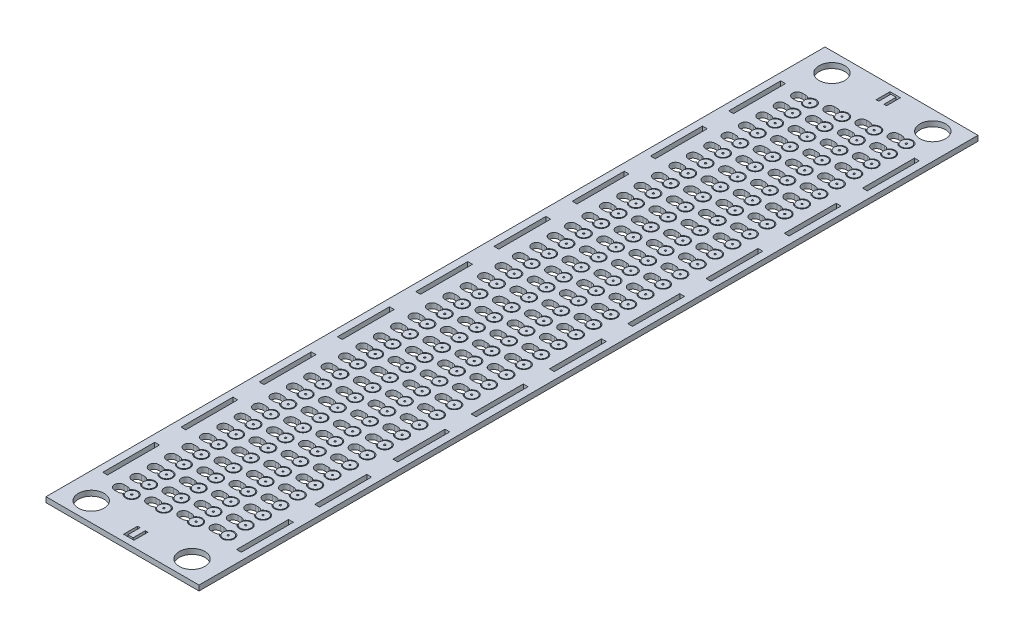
SolidWorks part; units mm, degrees
ref_plane "Alzado" through (0, 0, 0) normal (0, 0, 1) x (1, 0, 0)
ref_plane "Planta" through (0, 0, 0) normal (0, 1, 0) x (1, 0, 0)
ref_plane "Vista lateral" through (0, 0, 0) normal (1, 0, 0) x (0, 0, -1)
sketch "Croquis1" plane through (0, 0, 0) normal (0, 1, 0) x (1, 0, 0)
  line L0 (64.4, 425.95) -> (66.4, 425.95)
  line L1 (0, 0) -> (88, 0)
  line L2 (0, 0) -> (0, 448)
  line L3 (0, 448) -> (88, 448)
  line L4 (88, 0) -> (88, 448)
  line L5 (64.4, 420.45) -> (66.4, 420.45)
  line L6 (15, 444.4) -> (73, 444.4) construction
  line L7 (41, 444.4) -> (47, 444.4)
  line L8 (47, 444.4) -> (47, 436.4)
  line L9 (41, 444.4) -> (41, 436.4)
  line L10 (41, 436.4) -> (42.5, 436.4)
  line L11 (42.5, 436.4) -> (42.5, 443.4)
  line L12 (47, 436.4) -> (45.5, 436.4)
  line L13 (45.5, 436.4) -> (45.5, 443.4)
  line L14 (45.5, 443.4) -> (42.5, 443.4)
  line L15 (48.4, 423.45) -> (50.4, 423.45)
  line L16 (48.4, 417.95) -> (50.4, 417.95)
  line L17 (32.4, 420.95) -> (34.4, 420.95)
  line L18 (32.4, 415.45) -> (34.4, 415.45)
  line L19 (16.4, 418.45) -> (18.4, 418.45)
  line L20 (16.4, 412.95) -> (18.4, 412.95)
  line L21 (16.4, 415.7) -> (6.9, 415.7) construction
  line L22 (6.9, 415.7) -> (6.9, 418.3809) construction
  line L23 (6.9, 418.3809) -> (6.9, 388.4809)
  line L24 (6.9, 418.3809) -> (4.16, 418.3809)
  line L25 (6.9, 388.4809) -> (4.16, 388.4809)
  line L26 (4.16, 418.3809) -> (4.16, 388.4809)
  line L27 (0, 224) -> (88, 224) construction
  line L28 (44, 448) -> (44, 0) construction
  line L29 (81.1, 388.4809) -> (83.84, 388.4809)
  line L30 (81.1, 418.3809) -> (83.84, 418.3809)
  line L31 (83.84, 418.3809) -> (83.84, 388.4809)
  line L32 (81.1, 418.3809) -> (81.1, 388.4809)
  line L33 (6.9, 373.3809) -> (6.9, 343.4809)
  line L34 (6.9, 373.3809) -> (4.16, 373.3809)
  line L35 (4.16, 373.3809) -> (4.16, 343.4809)
  line L36 (6.9, 343.4809) -> (4.16, 343.4809)
  line L37 (83.84, 373.3809) -> (83.84, 343.4809)
  line L38 (81.1, 373.3809) -> (81.1, 343.4809)
  line L39 (81.1, 373.3809) -> (83.84, 373.3809)
  line L40 (81.1, 343.4809) -> (83.84, 343.4809)
  line L41 (6.9, 328.3809) -> (6.9, 298.4809)
  line L42 (6.9, 328.3809) -> (4.16, 328.3809)
  line L43 (4.16, 328.3809) -> (4.16, 298.4809)
  line L44 (6.9, 298.4809) -> (4.16, 298.4809)
  line L45 (83.84, 328.3809) -> (83.84, 298.4809)
  line L46 (81.1, 328.3809) -> (81.1, 298.4809)
  line L47 (81.1, 328.3809) -> (83.84, 328.3809)
  line L48 (81.1, 298.4809) -> (83.84, 298.4809)
  line L49 (6.9, 283.3809) -> (6.9, 253.4809)
  line L50 (6.9, 283.3809) -> (4.16, 283.3809)
  line L51 (4.16, 283.3809) -> (4.16, 253.4809)
  line L52 (6.9, 253.4809) -> (4.16, 253.4809)
  line L53 (83.84, 283.3809) -> (83.84, 253.4809)
  line L54 (81.1, 283.3809) -> (81.1, 253.4809)
  line L55 (81.1, 283.3809) -> (83.84, 283.3809)
  line L56 (81.1, 253.4809) -> (83.84, 253.4809)
  line L57 (6.9, 238.3809) -> (6.9, 208.4809)
  line L58 (6.9, 238.3809) -> (4.16, 238.3809)
  line L59 (4.16, 238.3809) -> (4.16, 208.4809)
  line L60 (6.9, 208.4809) -> (4.16, 208.4809)
  line L61 (83.84, 238.3809) -> (83.84, 208.4809)
  line L62 (81.1, 238.3809) -> (81.1, 208.4809)
  line L63 (81.1, 238.3809) -> (83.84, 238.3809)
  line L64 (81.1, 208.4809) -> (83.84, 208.4809)
  line L65 (6.9, 193.3809) -> (6.9, 163.4809)
  line L66 (6.9, 193.3809) -> (4.16, 193.3809)
  line L67 (4.16, 193.3809) -> (4.16, 163.4809)
  line L68 (6.9, 163.4809) -> (4.16, 163.4809)
  line L69 (83.84, 193.3809) -> (83.84, 163.4809)
  line L70 (81.1, 193.3809) -> (81.1, 163.4809)
  line L71 (81.1, 193.3809) -> (83.84, 193.3809)
  line L72 (81.1, 163.4809) -> (83.84, 163.4809)
  line L73 (6.9, 148.3809) -> (6.9, 118.4809)
  line L74 (6.9, 148.3809) -> (4.16, 148.3809)
  line L75 (4.16, 148.3809) -> (4.16, 118.4809)
  line L76 (6.9, 118.4809) -> (4.16, 118.4809)
  line L77 (83.84, 148.3809) -> (83.84, 118.4809)
  line L78 (81.1, 148.3809) -> (81.1, 118.4809)
  line L79 (81.1, 148.3809) -> (83.84, 148.3809)
  line L80 (81.1, 118.4809) -> (83.84, 118.4809)
  line L81 (6.9, 103.3809) -> (6.9, 73.4809)
  line L82 (6.9, 103.3809) -> (4.16, 103.3809)
  line L83 (4.16, 103.3809) -> (4.16, 73.4809)
  line L84 (6.9, 73.4809) -> (4.16, 73.4809)
  line L85 (83.84, 103.3809) -> (83.84, 73.4809)
  line L86 (81.1, 103.3809) -> (81.1, 73.4809)
  line L87 (81.1, 103.3809) -> (83.84, 103.3809)
  line L88 (81.1, 73.4809) -> (83.84, 73.4809)
  line L89 (6.9, 58.3809) -> (6.9, 28.4809)
  line L90 (6.9, 58.3809) -> (4.16, 58.3809)
  line L91 (4.16, 58.3809) -> (4.16, 28.4809)
  line L92 (6.9, 28.4809) -> (4.16, 28.4809)
  line L93 (83.84, 58.3809) -> (83.84, 28.4809)
  line L94 (81.1, 58.3809) -> (81.1, 28.4809)
  line L95 (81.1, 58.3809) -> (83.84, 58.3809)
  line L96 (81.1, 28.4809) -> (83.84, 28.4809)
  line L97 (47, 11.6) -> (45.5, 11.6)
  line L98 (41, 11.6) -> (42.5, 11.6)
  line L99 (47, 3.6) -> (47, 11.6)
  line L100 (45.5, 11.6) -> (45.5, 4.6)
  line L101 (45.5, 4.6) -> (42.5, 4.6)
  line L102 (42.5, 11.6) -> (42.5, 4.6)
  line L103 (41, 3.6) -> (41, 11.6)
  line L104 (41, 3.6) -> (47, 3.6)
  line L105 (16.4, 408.45) -> (18.4, 408.45)
  line L106 (16.4, 402.95) -> (18.4, 402.95)
  line L107 (32.4, 410.95) -> (34.4, 410.95)
  line L108 (32.4, 405.45) -> (34.4, 405.45)
  line L109 (48.4, 413.45) -> (50.4, 413.45)
  line L110 (48.4, 407.95) -> (50.4, 407.95)
  line L111 (64.4, 410.45) -> (66.4, 410.45)
  line L112 (64.4, 415.95) -> (66.4, 415.95)
  line L113 (16.4, 398.45) -> (18.4, 398.45)
  line L114 (16.4, 392.95) -> (18.4, 392.95)
  line L115 (32.4, 400.95) -> (34.4, 400.95)
  line L116 (32.4, 395.45) -> (34.4, 395.45)
  line L117 (48.4, 403.45) -> (50.4, 403.45)
  line L118 (48.4, 397.95) -> (50.4, 397.95)
  line L119 (64.4, 400.45) -> (66.4, 400.45)
  line L120 (64.4, 405.95) -> (66.4, 405.95)
  line L121 (16.4, 388.45) -> (18.4, 388.45)
  line L122 (16.4, 382.95) -> (18.4, 382.95)
  line L123 (32.4, 390.95) -> (34.4, 390.95)
  line L124 (32.4, 385.45) -> (34.4, 385.45)
  line L125 (48.4, 393.45) -> (50.4, 393.45)
  line L126 (48.4, 387.95) -> (50.4, 387.95)
  line L127 (64.4, 390.45) -> (66.4, 390.45)
  line L128 (64.4, 395.95) -> (66.4, 395.95)
  line L129 (16.4, 378.45) -> (18.4, 378.45)
  line L130 (16.4, 372.95) -> (18.4, 372.95)
  line L131 (32.4, 380.95) -> (34.4, 380.95)
  line L132 (32.4, 375.45) -> (34.4, 375.45)
  line L133 (48.4, 383.45) -> (50.4, 383.45)
  line L134 (48.4, 377.95) -> (50.4, 377.95)
  line L135 (64.4, 380.45) -> (66.4, 380.45)
  line L136 (64.4, 385.95) -> (66.4, 385.95)
  line L137 (16.4, 368.45) -> (18.4, 368.45)
  line L138 (16.4, 362.95) -> (18.4, 362.95)
  line L139 (32.4, 370.95) -> (34.4, 370.95)
  line L140 (32.4, 365.45) -> (34.4, 365.45)
  line L141 (48.4, 373.45) -> (50.4, 373.45)
  line L142 (48.4, 367.95) -> (50.4, 367.95)
  line L143 (64.4, 370.45) -> (66.4, 370.45)
  line L144 (64.4, 375.95) -> (66.4, 375.95)
  line L145 (16.4, 358.45) -> (18.4, 358.45)
  line L146 (16.4, 352.95) -> (18.4, 352.95)
  line L147 (32.4, 360.95) -> (34.4, 360.95)
  line L148 (32.4, 355.45) -> (34.4, 355.45)
  line L149 (48.4, 363.45) -> (50.4, 363.45)
  line L150 (48.4, 357.95) -> (50.4, 357.95)
  line L151 (64.4, 360.45) -> (66.4, 360.45)
  line L152 (64.4, 365.95) -> (66.4, 365.95)
  line L153 (16.4, 348.45) -> (18.4, 348.45)
  line L154 (16.4, 342.95) -> (18.4, 342.95)
  line L155 (32.4, 350.95) -> (34.4, 350.95)
  line L156 (32.4, 345.45) -> (34.4, 345.45)
  line L157 (48.4, 353.45) -> (50.4, 353.45)
  line L158 (48.4, 347.95) -> (50.4, 347.95)
  line L159 (64.4, 350.45) -> (66.4, 350.45)
  line L160 (64.4, 355.95) -> (66.4, 355.95)
  line L161 (16.4, 338.45) -> (18.4, 338.45)
  line L162 (16.4, 332.95) -> (18.4, 332.95)
  line L163 (32.4, 340.95) -> (34.4, 340.95)
  line L164 (32.4, 335.45) -> (34.4, 335.45)
  line L165 (48.4, 343.45) -> (50.4, 343.45)
  line L166 (48.4, 337.95) -> (50.4, 337.95)
  line L167 (64.4, 340.45) -> (66.4, 340.45)
  line L168 (64.4, 345.95) -> (66.4, 345.95)
  line L169 (16.4, 328.45) -> (18.4, 328.45)
  line L170 (16.4, 322.95) -> (18.4, 322.95)
  line L171 (32.4, 330.95) -> (34.4, 330.95)
  line L172 (32.4, 325.45) -> (34.4, 325.45)
  line L173 (48.4, 333.45) -> (50.4, 333.45)
  line L174 (48.4, 327.95) -> (50.4, 327.95)
  line L175 (64.4, 330.45) -> (66.4, 330.45)
  line L176 (64.4, 335.95) -> (66.4, 335.95)
  line L177 (16.4, 318.45) -> (18.4, 318.45)
  line L178 (16.4, 312.95) -> (18.4, 312.95)
  line L179 (32.4, 320.95) -> (34.4, 320.95)
  line L180 (32.4, 315.45) -> (34.4, 315.45)
  line L181 (48.4, 323.45) -> (50.4, 323.45)
  line L182 (48.4, 317.95) -> (50.4, 317.95)
  line L183 (64.4, 320.45) -> (66.4, 320.45)
  line L184 (64.4, 325.95) -> (66.4, 325.95)
  line L185 (16.4, 308.45) -> (18.4, 308.45)
  line L186 (16.4, 302.95) -> (18.4, 302.95)
  line L187 (32.4, 310.95) -> (34.4, 310.95)
  line L188 (32.4, 305.45) -> (34.4, 305.45)
  line L189 (48.4, 313.45) -> (50.4, 313.45)
  line L190 (48.4, 307.95) -> (50.4, 307.95)
  line L191 (64.4, 310.45) -> (66.4, 310.45)
  line L192 (64.4, 315.95) -> (66.4, 315.95)
  line L193 (16.4, 298.45) -> (18.4, 298.45)
  line L194 (16.4, 292.95) -> (18.4, 292.95)
  line L195 (32.4, 300.95) -> (34.4, 300.95)
  line L196 (32.4, 295.45) -> (34.4, 295.45)
  line L197 (48.4, 303.45) -> (50.4, 303.45)
  line L198 (48.4, 297.95) -> (50.4, 297.95)
  line L199 (64.4, 300.45) -> (66.4, 300.45)
  line L200 (64.4, 305.95) -> (66.4, 305.95)
  line L201 (16.4, 288.45) -> (18.4, 288.45)
  line L202 (16.4, 282.95) -> (18.4, 282.95)
  line L203 (32.4, 290.95) -> (34.4, 290.95)
  line L204 (32.4, 285.45) -> (34.4, 285.45)
  line L205 (48.4, 293.45) -> (50.4, 293.45)
  line L206 (48.4, 287.95) -> (50.4, 287.95)
  line L207 (64.4, 290.45) -> (66.4, 290.45)
  line L208 (64.4, 295.95) -> (66.4, 295.95)
  line L209 (16.4, 278.45) -> (18.4, 278.45)
  line L210 (16.4, 272.95) -> (18.4, 272.95)
  line L211 (32.4, 280.95) -> (34.4, 280.95)
  line L212 (32.4, 275.45) -> (34.4, 275.45)
  line L213 (48.4, 283.45) -> (50.4, 283.45)
  line L214 (48.4, 277.95) -> (50.4, 277.95)
  line L215 (64.4, 280.45) -> (66.4, 280.45)
  line L216 (64.4, 285.95) -> (66.4, 285.95)
  line L217 (16.4, 268.45) -> (18.4, 268.45)
  line L218 (16.4, 262.95) -> (18.4, 262.95)
  line L219 (32.4, 270.95) -> (34.4, 270.95)
  line L220 (32.4, 265.45) -> (34.4, 265.45)
  line L221 (48.4, 273.45) -> (50.4, 273.45)
  line L222 (48.4, 267.95) -> (50.4, 267.95)
  line L223 (64.4, 270.45) -> (66.4, 270.45)
  line L224 (64.4, 275.95) -> (66.4, 275.95)
  line L225 (16.4, 258.45) -> (18.4, 258.45)
  line L226 (16.4, 252.95) -> (18.4, 252.95)
  line L227 (32.4, 260.95) -> (34.4, 260.95)
  line L228 (32.4, 255.45) -> (34.4, 255.45)
  line L229 (48.4, 263.45) -> (50.4, 263.45)
  line L230 (48.4, 257.95) -> (50.4, 257.95)
  line L231 (64.4, 260.45) -> (66.4, 260.45)
  line L232 (64.4, 265.95) -> (66.4, 265.95)
  line L233 (16.4, 248.45) -> (18.4, 248.45)
  line L234 (16.4, 242.95) -> (18.4, 242.95)
  line L235 (32.4, 250.95) -> (34.4, 250.95)
  line L236 (32.4, 245.45) -> (34.4, 245.45)
  line L237 (48.4, 253.45) -> (50.4, 253.45)
  line L238 (48.4, 247.95) -> (50.4, 247.95)
  line L239 (64.4, 250.45) -> (66.4, 250.45)
  line L240 (64.4, 255.95) -> (66.4, 255.95)
  line L241 (16.4, 238.45) -> (18.4, 238.45)
  line L242 (16.4, 232.95) -> (18.4, 232.95)
  line L243 (32.4, 240.95) -> (34.4, 240.95)
  line L244 (32.4, 235.45) -> (34.4, 235.45)
  line L245 (48.4, 243.45) -> (50.4, 243.45)
  line L246 (48.4, 237.95) -> (50.4, 237.95)
  line L247 (64.4, 240.45) -> (66.4, 240.45)
  line L248 (64.4, 245.95) -> (66.4, 245.95)
  line L249 (16.4, 228.45) -> (18.4, 228.45)
  line L250 (16.4, 222.95) -> (18.4, 222.95)
  line L251 (32.4, 230.95) -> (34.4, 230.95)
  line L252 (32.4, 225.45) -> (34.4, 225.45)
  line L253 (48.4, 233.45) -> (50.4, 233.45)
  line L254 (48.4, 227.95) -> (50.4, 227.95)
  line L255 (64.4, 230.45) -> (66.4, 230.45)
  line L256 (64.4, 235.95) -> (66.4, 235.95)
  line L257 (16.4, 218.45) -> (18.4, 218.45)
  line L258 (16.4, 212.95) -> (18.4, 212.95)
  line L259 (32.4, 220.95) -> (34.4, 220.95)
  line L260 (32.4, 215.45) -> (34.4, 215.45)
  line L261 (48.4, 223.45) -> (50.4, 223.45)
  line L262 (48.4, 217.95) -> (50.4, 217.95)
  line L263 (64.4, 220.45) -> (66.4, 220.45)
  line L264 (64.4, 225.95) -> (66.4, 225.95)
  line L265 (16.4, 208.45) -> (18.4, 208.45)
  line L266 (16.4, 202.95) -> (18.4, 202.95)
  line L267 (32.4, 210.95) -> (34.4, 210.95)
  line L268 (32.4, 205.45) -> (34.4, 205.45)
  line L269 (48.4, 213.45) -> (50.4, 213.45)
  line L270 (48.4, 207.95) -> (50.4, 207.95)
  line L271 (64.4, 210.45) -> (66.4, 210.45)
  line L272 (64.4, 215.95) -> (66.4, 215.95)
  line L273 (16.4, 198.45) -> (18.4, 198.45)
  line L274 (16.4, 192.95) -> (18.4, 192.95)
  line L275 (32.4, 200.95) -> (34.4, 200.95)
  line L276 (32.4, 195.45) -> (34.4, 195.45)
  line L277 (48.4, 203.45) -> (50.4, 203.45)
  line L278 (48.4, 197.95) -> (50.4, 197.95)
  line L279 (64.4, 200.45) -> (66.4, 200.45)
  line L280 (64.4, 205.95) -> (66.4, 205.95)
  line L281 (16.4, 188.45) -> (18.4, 188.45)
  line L282 (16.4, 182.95) -> (18.4, 182.95)
  line L283 (32.4, 190.95) -> (34.4, 190.95)
  line L284 (32.4, 185.45) -> (34.4, 185.45)
  line L285 (48.4, 193.45) -> (50.4, 193.45)
  line L286 (48.4, 187.95) -> (50.4, 187.95)
  line L287 (64.4, 190.45) -> (66.4, 190.45)
  line L288 (64.4, 195.95) -> (66.4, 195.95)
  line L289 (16.4, 178.45) -> (18.4, 178.45)
  line L290 (16.4, 172.95) -> (18.4, 172.95)
  line L291 (32.4, 180.95) -> (34.4, 180.95)
  line L292 (32.4, 175.45) -> (34.4, 175.45)
  line L293 (48.4, 183.45) -> (50.4, 183.45)
  line L294 (48.4, 177.95) -> (50.4, 177.95)
  line L295 (64.4, 180.45) -> (66.4, 180.45)
  line L296 (64.4, 185.95) -> (66.4, 185.95)
  line L297 (16.4, 168.45) -> (18.4, 168.45)
  line L298 (16.4, 162.95) -> (18.4, 162.95)
  line L299 (32.4, 170.95) -> (34.4, 170.95)
  line L300 (32.4, 165.45) -> (34.4, 165.45)
  line L301 (48.4, 173.45) -> (50.4, 173.45)
  line L302 (48.4, 167.95) -> (50.4, 167.95)
  line L303 (64.4, 170.45) -> (66.4, 170.45)
  line L304 (64.4, 175.95) -> (66.4, 175.95)
  line L305 (16.4, 158.45) -> (18.4, 158.45)
  line L306 (16.4, 152.95) -> (18.4, 152.95)
  line L307 (32.4, 160.95) -> (34.4, 160.95)
  line L308 (32.4, 155.45) -> (34.4, 155.45)
  line L309 (48.4, 163.45) -> (50.4, 163.45)
  line L310 (48.4, 157.95) -> (50.4, 157.95)
  line L311 (64.4, 160.45) -> (66.4, 160.45)
  line L312 (64.4, 165.95) -> (66.4, 165.95)
  line L313 (16.4, 148.45) -> (18.4, 148.45)
  line L314 (16.4, 142.95) -> (18.4, 142.95)
  line L315 (32.4, 150.95) -> (34.4, 150.95)
  line L316 (32.4, 145.45) -> (34.4, 145.45)
  line L317 (48.4, 153.45) -> (50.4, 153.45)
  line L318 (48.4, 147.95) -> (50.4, 147.95)
  line L319 (64.4, 150.45) -> (66.4, 150.45)
  line L320 (64.4, 155.95) -> (66.4, 155.95)
  line L321 (16.4, 138.45) -> (18.4, 138.45)
  line L322 (16.4, 132.95) -> (18.4, 132.95)
  line L323 (32.4, 140.95) -> (34.4, 140.95)
  line L324 (32.4, 135.45) -> (34.4, 135.45)
  line L325 (48.4, 143.45) -> (50.4, 143.45)
  line L326 (48.4, 137.95) -> (50.4, 137.95)
  line L327 (64.4, 140.45) -> (66.4, 140.45)
  line L328 (64.4, 145.95) -> (66.4, 145.95)
  line L329 (16.4, 128.45) -> (18.4, 128.45)
  line L330 (16.4, 122.95) -> (18.4, 122.95)
  line L331 (32.4, 130.95) -> (34.4, 130.95)
  line L332 (32.4, 125.45) -> (34.4, 125.45)
  line L333 (48.4, 133.45) -> (50.4, 133.45)
  line L334 (48.4, 127.95) -> (50.4, 127.95)
  line L335 (64.4, 130.45) -> (66.4, 130.45)
  line L336 (64.4, 135.95) -> (66.4, 135.95)
  line L337 (16.4, 118.45) -> (18.4, 118.45)
  line L338 (16.4, 112.95) -> (18.4, 112.95)
  line L339 (32.4, 120.95) -> (34.4, 120.95)
  line L340 (32.4, 115.45) -> (34.4, 115.45)
  line L341 (48.4, 123.45) -> (50.4, 123.45)
  line L342 (48.4, 117.95) -> (50.4, 117.95)
  line L343 (64.4, 120.45) -> (66.4, 120.45)
  line L344 (64.4, 125.95) -> (66.4, 125.95)
  line L345 (16.4, 108.45) -> (18.4, 108.45)
  line L346 (16.4, 102.95) -> (18.4, 102.95)
  line L347 (32.4, 110.95) -> (34.4, 110.95)
  line L348 (32.4, 105.45) -> (34.4, 105.45)
  line L349 (48.4, 113.45) -> (50.4, 113.45)
  line L350 (48.4, 107.95) -> (50.4, 107.95)
  line L351 (64.4, 110.45) -> (66.4, 110.45)
  line L352 (64.4, 115.95) -> (66.4, 115.95)
  line L353 (16.4, 98.45) -> (18.4, 98.45)
  line L354 (16.4, 92.95) -> (18.4, 92.95)
  line L355 (32.4, 100.95) -> (34.4, 100.95)
  line L356 (32.4, 95.45) -> (34.4, 95.45)
  line L357 (48.4, 103.45) -> (50.4, 103.45)
  line L358 (48.4, 97.95) -> (50.4, 97.95)
  line L359 (64.4, 100.45) -> (66.4, 100.45)
  line L360 (64.4, 105.95) -> (66.4, 105.95)
  line L361 (16.4, 88.45) -> (18.4, 88.45)
  line L362 (16.4, 82.95) -> (18.4, 82.95)
  line L363 (32.4, 90.95) -> (34.4, 90.95)
  line L364 (32.4, 85.45) -> (34.4, 85.45)
  line L365 (48.4, 93.45) -> (50.4, 93.45)
  line L366 (48.4, 87.95) -> (50.4, 87.95)
  line L367 (64.4, 90.45) -> (66.4, 90.45)
  line L368 (64.4, 95.95) -> (66.4, 95.95)
  line L369 (16.4, 78.45) -> (18.4, 78.45)
  line L370 (16.4, 72.95) -> (18.4, 72.95)
  line L371 (32.4, 80.95) -> (34.4, 80.95)
  line L372 (32.4, 75.45) -> (34.4, 75.45)
  line L373 (48.4, 83.45) -> (50.4, 83.45)
  line L374 (48.4, 77.95) -> (50.4, 77.95)
  line L375 (64.4, 80.45) -> (66.4, 80.45)
  line L376 (64.4, 85.95) -> (66.4, 85.95)
  line L377 (16.4, 68.45) -> (18.4, 68.45)
  line L378 (16.4, 62.95) -> (18.4, 62.95)
  line L379 (32.4, 70.95) -> (34.4, 70.95)
  line L380 (32.4, 65.45) -> (34.4, 65.45)
  line L381 (48.4, 73.45) -> (50.4, 73.45)
  line L382 (48.4, 67.95) -> (50.4, 67.95)
  line L383 (64.4, 70.45) -> (66.4, 70.45)
  line L384 (64.4, 75.95) -> (66.4, 75.95)
  line L385 (16.4, 58.45) -> (18.4, 58.45)
  line L386 (16.4, 52.95) -> (18.4, 52.95)
  line L387 (32.4, 60.95) -> (34.4, 60.95)
  line L388 (32.4, 55.45) -> (34.4, 55.45)
  line L389 (48.4, 63.45) -> (50.4, 63.45)
  line L390 (48.4, 57.95) -> (50.4, 57.95)
  line L391 (64.4, 60.45) -> (66.4, 60.45)
  line L392 (64.4, 65.95) -> (66.4, 65.95)
  line L393 (16.4, 48.45) -> (18.4, 48.45)
  line L394 (16.4, 42.95) -> (18.4, 42.95)
  line L395 (32.4, 50.95) -> (34.4, 50.95)
  line L396 (32.4, 45.45) -> (34.4, 45.45)
  line L397 (48.4, 53.45) -> (50.4, 53.45)
  line L398 (48.4, 47.95) -> (50.4, 47.95)
  line L399 (64.4, 50.45) -> (66.4, 50.45)
  line L400 (64.4, 55.95) -> (66.4, 55.95)
  line L401 (16.4, 38.45) -> (18.4, 38.45)
  line L402 (16.4, 32.95) -> (18.4, 32.95)
  line L403 (32.4, 40.95) -> (34.4, 40.95)
  line L404 (32.4, 35.45) -> (34.4, 35.45)
  line L405 (48.4, 43.45) -> (50.4, 43.45)
  line L406 (48.4, 37.95) -> (50.4, 37.95)
  line L407 (64.4, 40.45) -> (66.4, 40.45)
  line L408 (64.4, 45.95) -> (66.4, 45.95)
  line L409 (16.4, 28.45) -> (18.4, 28.45)
  line L410 (16.4, 22.95) -> (18.4, 22.95)
  line L411 (32.4, 30.95) -> (34.4, 30.95)
  line L412 (32.4, 25.45) -> (34.4, 25.45)
  line L413 (48.4, 33.45) -> (50.4, 33.45)
  line L414 (48.4, 27.95) -> (50.4, 27.95)
  line L415 (64.4, 30.45) -> (66.4, 30.45)
  line L416 (64.4, 35.95) -> (66.4, 35.95)
  circle A0 centre (15, 437) radius 7.4
  circle A1 centre (73, 437) radius 7.4
  arc A2 (68.5493, 421.4845) -> (68.5493, 424.9155) centre (71.6, 423.2) ccw
  circle A3 centre (71.6, 423.2) radius 3
  circle A4 centre (71.6, 423.2) radius 0.5
  arc A5 (64.4, 425.95) -> (64.4, 420.45) centre (64.4, 423.2) ccw
  arc A6 (66.4, 420.45) -> (68.5493, 421.4845) centre (66.4, 423.2) ccw
  arc A7 (68.5493, 424.9155) -> (66.4, 425.95) centre (66.4, 423.2) ccw
  circle A8 centre (15, 11) radius 7.4
  circle A9 centre (73, 11) radius 7.4
  circle A10 centre (55.6, 420.7) radius 3
  arc A11 (50.4, 417.95) -> (52.5493, 418.9845) centre (50.4, 420.7) ccw
  arc A12 (48.4, 423.45) -> (48.4, 417.95) centre (48.4, 420.7) ccw
  arc A13 (52.5493, 422.4155) -> (50.4, 423.45) centre (50.4, 420.7) ccw
  arc A14 (52.5493, 418.9845) -> (52.5493, 422.4155) centre (55.6, 420.7) ccw
  circle A15 centre (55.6, 420.7) radius 0.5
  circle A16 centre (39.6, 418.2) radius 3
  arc A17 (34.4, 415.45) -> (36.5493, 416.4845) centre (34.4, 418.2) ccw
  arc A18 (32.4, 420.95) -> (32.4, 415.45) centre (32.4, 418.2) ccw
  arc A19 (36.5493, 419.9155) -> (34.4, 420.95) centre (34.4, 418.2) ccw
  arc A20 (36.5493, 416.4845) -> (36.5493, 419.9155) centre (39.6, 418.2) ccw
  circle A21 centre (39.6, 418.2) radius 0.5
  circle A22 centre (23.6, 415.7) radius 3
  arc A23 (18.4, 412.95) -> (20.5493, 413.9845) centre (18.4, 415.7) ccw
  arc A24 (16.4, 418.45) -> (16.4, 412.95) centre (16.4, 415.7) ccw
  arc A25 (20.5493, 417.4155) -> (18.4, 418.45) centre (18.4, 415.7) ccw
  arc A26 (20.5493, 413.9845) -> (20.5493, 417.4155) centre (23.6, 415.7) ccw
  circle A27 centre (23.6, 415.7) radius 0.5
  arc A28 (16.4, 408.45) -> (16.4, 402.95) centre (16.4, 405.7) ccw
  arc A29 (20.5493, 407.4155) -> (18.4, 408.45) centre (18.4, 405.7) ccw
  arc A30 (18.4, 402.95) -> (20.5493, 403.9845) centre (18.4, 405.7) ccw
  circle A31 centre (23.6, 405.7) radius 3
  circle A32 centre (23.6, 405.7) radius 0.5
  arc A33 (20.5493, 403.9845) -> (20.5493, 407.4155) centre (23.6, 405.7) ccw
  arc A34 (32.4, 410.95) -> (32.4, 405.45) centre (32.4, 408.2) ccw
  arc A35 (36.5493, 409.9155) -> (34.4, 410.95) centre (34.4, 408.2) ccw
  arc A36 (34.4, 405.45) -> (36.5493, 406.4845) centre (34.4, 408.2) ccw
  arc A37 (36.5493, 406.4845) -> (36.5493, 409.9155) centre (39.6, 408.2) ccw
  circle A38 centre (39.6, 408.2) radius 3
  circle A39 centre (39.6, 408.2) radius 0.5
  arc A40 (48.4, 413.45) -> (48.4, 407.95) centre (48.4, 410.7) ccw
  arc A41 (52.5493, 412.4155) -> (50.4, 413.45) centre (50.4, 410.7) ccw
  arc A42 (50.4, 407.95) -> (52.5493, 408.9845) centre (50.4, 410.7) ccw
  arc A43 (52.5493, 408.9845) -> (52.5493, 412.4155) centre (55.6, 410.7) ccw
  circle A44 centre (55.6, 410.7) radius 3
  circle A45 centre (55.6, 410.7) radius 0.5
  arc A46 (64.4, 415.95) -> (64.4, 410.45) centre (64.4, 413.2) ccw
  arc A47 (66.4, 410.45) -> (68.5493, 411.4845) centre (66.4, 413.2) ccw
  arc A48 (68.5493, 414.9155) -> (66.4, 415.95) centre (66.4, 413.2) ccw
  arc A49 (68.5493, 411.4845) -> (68.5493, 414.9155) centre (71.6, 413.2) ccw
  circle A50 centre (71.6, 413.2) radius 3
  circle A51 centre (71.6, 413.2) radius 0.5
  arc A52 (16.4, 398.45) -> (16.4, 392.95) centre (16.4, 395.7) ccw
  arc A53 (20.5493, 397.4155) -> (18.4, 398.45) centre (18.4, 395.7) ccw
  arc A54 (18.4, 392.95) -> (20.5493, 393.9845) centre (18.4, 395.7) ccw
  circle A55 centre (23.6, 395.7) radius 3
  circle A56 centre (23.6, 395.7) radius 0.5
  arc A57 (20.5493, 393.9845) -> (20.5493, 397.4155) centre (23.6, 395.7) ccw
  arc A58 (32.4, 400.95) -> (32.4, 395.45) centre (32.4, 398.2) ccw
  arc A59 (36.5493, 399.9155) -> (34.4, 400.95) centre (34.4, 398.2) ccw
  arc A60 (34.4, 395.45) -> (36.5493, 396.4845) centre (34.4, 398.2) ccw
  arc A61 (36.5493, 396.4845) -> (36.5493, 399.9155) centre (39.6, 398.2) ccw
  circle A62 centre (39.6, 398.2) radius 3
  circle A63 centre (39.6, 398.2) radius 0.5
  arc A64 (48.4, 403.45) -> (48.4, 397.95) centre (48.4, 400.7) ccw
  arc A65 (52.5493, 402.4155) -> (50.4, 403.45) centre (50.4, 400.7) ccw
  arc A66 (50.4, 397.95) -> (52.5493, 398.9845) centre (50.4, 400.7) ccw
  arc A67 (52.5493, 398.9845) -> (52.5493, 402.4155) centre (55.6, 400.7) ccw
  circle A68 centre (55.6, 400.7) radius 3
  circle A69 centre (55.6, 400.7) radius 0.5
  arc A70 (64.4, 405.95) -> (64.4, 400.45) centre (64.4, 403.2) ccw
  arc A71 (66.4, 400.45) -> (68.5493, 401.4845) centre (66.4, 403.2) ccw
  arc A72 (68.5493, 404.9155) -> (66.4, 405.95) centre (66.4, 403.2) ccw
  arc A73 (68.5493, 401.4845) -> (68.5493, 404.9155) centre (71.6, 403.2) ccw
  circle A74 centre (71.6, 403.2) radius 3
  circle A75 centre (71.6, 403.2) radius 0.5
  arc A76 (16.4, 388.45) -> (16.4, 382.95) centre (16.4, 385.7) ccw
  arc A77 (20.5493, 387.4155) -> (18.4, 388.45) centre (18.4, 385.7) ccw
  arc A78 (18.4, 382.95) -> (20.5493, 383.9845) centre (18.4, 385.7) ccw
  circle A79 centre (23.6, 385.7) radius 3
  circle A80 centre (23.6, 385.7) radius 0.5
  arc A81 (20.5493, 383.9845) -> (20.5493, 387.4155) centre (23.6, 385.7) ccw
  arc A82 (32.4, 390.95) -> (32.4, 385.45) centre (32.4, 388.2) ccw
  arc A83 (36.5493, 389.9155) -> (34.4, 390.95) centre (34.4, 388.2) ccw
  arc A84 (34.4, 385.45) -> (36.5493, 386.4845) centre (34.4, 388.2) ccw
  arc A85 (36.5493, 386.4845) -> (36.5493, 389.9155) centre (39.6, 388.2) ccw
  circle A86 centre (39.6, 388.2) radius 3
  circle A87 centre (39.6, 388.2) radius 0.5
  arc A88 (48.4, 393.45) -> (48.4, 387.95) centre (48.4, 390.7) ccw
  arc A89 (52.5493, 392.4155) -> (50.4, 393.45) centre (50.4, 390.7) ccw
  arc A90 (50.4, 387.95) -> (52.5493, 388.9845) centre (50.4, 390.7) ccw
  arc A91 (52.5493, 388.9845) -> (52.5493, 392.4155) centre (55.6, 390.7) ccw
  circle A92 centre (55.6, 390.7) radius 3
  circle A93 centre (55.6, 390.7) radius 0.5
  arc A94 (64.4, 395.95) -> (64.4, 390.45) centre (64.4, 393.2) ccw
  arc A95 (66.4, 390.45) -> (68.5493, 391.4845) centre (66.4, 393.2) ccw
  arc A96 (68.5493, 394.9155) -> (66.4, 395.95) centre (66.4, 393.2) ccw
  arc A97 (68.5493, 391.4845) -> (68.5493, 394.9155) centre (71.6, 393.2) ccw
  circle A98 centre (71.6, 393.2) radius 3
  circle A99 centre (71.6, 393.2) radius 0.5
  arc A100 (16.4, 378.45) -> (16.4, 372.95) centre (16.4, 375.7) ccw
  arc A101 (20.5493, 377.4155) -> (18.4, 378.45) centre (18.4, 375.7) ccw
  arc A102 (18.4, 372.95) -> (20.5493, 373.9845) centre (18.4, 375.7) ccw
  circle A103 centre (23.6, 375.7) radius 3
  circle A104 centre (23.6, 375.7) radius 0.5
  arc A105 (20.5493, 373.9845) -> (20.5493, 377.4155) centre (23.6, 375.7) ccw
  arc A106 (32.4, 380.95) -> (32.4, 375.45) centre (32.4, 378.2) ccw
  arc A107 (36.5493, 379.9155) -> (34.4, 380.95) centre (34.4, 378.2) ccw
  arc A108 (34.4, 375.45) -> (36.5493, 376.4845) centre (34.4, 378.2) ccw
  arc A109 (36.5493, 376.4845) -> (36.5493, 379.9155) centre (39.6, 378.2) ccw
  circle A110 centre (39.6, 378.2) radius 3
  circle A111 centre (39.6, 378.2) radius 0.5
  arc A112 (48.4, 383.45) -> (48.4, 377.95) centre (48.4, 380.7) ccw
  arc A113 (52.5493, 382.4155) -> (50.4, 383.45) centre (50.4, 380.7) ccw
  arc A114 (50.4, 377.95) -> (52.5493, 378.9845) centre (50.4, 380.7) ccw
  arc A115 (52.5493, 378.9845) -> (52.5493, 382.4155) centre (55.6, 380.7) ccw
  circle A116 centre (55.6, 380.7) radius 3
  circle A117 centre (55.6, 380.7) radius 0.5
  arc A118 (64.4, 385.95) -> (64.4, 380.45) centre (64.4, 383.2) ccw
  arc A119 (66.4, 380.45) -> (68.5493, 381.4845) centre (66.4, 383.2) ccw
  arc A120 (68.5493, 384.9155) -> (66.4, 385.95) centre (66.4, 383.2) ccw
  arc A121 (68.5493, 381.4845) -> (68.5493, 384.9155) centre (71.6, 383.2) ccw
  circle A122 centre (71.6, 383.2) radius 3
  circle A123 centre (71.6, 383.2) radius 0.5
  arc A124 (16.4, 368.45) -> (16.4, 362.95) centre (16.4, 365.7) ccw
  arc A125 (20.5493, 367.4155) -> (18.4, 368.45) centre (18.4, 365.7) ccw
  arc A126 (18.4, 362.95) -> (20.5493, 363.9845) centre (18.4, 365.7) ccw
  circle A127 centre (23.6, 365.7) radius 3
  circle A128 centre (23.6, 365.7) radius 0.5
  arc A129 (20.5493, 363.9845) -> (20.5493, 367.4155) centre (23.6, 365.7) ccw
  arc A130 (32.4, 370.95) -> (32.4, 365.45) centre (32.4, 368.2) ccw
  arc A131 (36.5493, 369.9155) -> (34.4, 370.95) centre (34.4, 368.2) ccw
  arc A132 (34.4, 365.45) -> (36.5493, 366.4845) centre (34.4, 368.2) ccw
  arc A133 (36.5493, 366.4845) -> (36.5493, 369.9155) centre (39.6, 368.2) ccw
  circle A134 centre (39.6, 368.2) radius 3
  circle A135 centre (39.6, 368.2) radius 0.5
  arc A136 (48.4, 373.45) -> (48.4, 367.95) centre (48.4, 370.7) ccw
  arc A137 (52.5493, 372.4155) -> (50.4, 373.45) centre (50.4, 370.7) ccw
  arc A138 (50.4, 367.95) -> (52.5493, 368.9845) centre (50.4, 370.7) ccw
  arc A139 (52.5493, 368.9845) -> (52.5493, 372.4155) centre (55.6, 370.7) ccw
  circle A140 centre (55.6, 370.7) radius 3
  circle A141 centre (55.6, 370.7) radius 0.5
  arc A142 (64.4, 375.95) -> (64.4, 370.45) centre (64.4, 373.2) ccw
  arc A143 (66.4, 370.45) -> (68.5493, 371.4845) centre (66.4, 373.2) ccw
  arc A144 (68.5493, 374.9155) -> (66.4, 375.95) centre (66.4, 373.2) ccw
  arc A145 (68.5493, 371.4845) -> (68.5493, 374.9155) centre (71.6, 373.2) ccw
  circle A146 centre (71.6, 373.2) radius 3
  circle A147 centre (71.6, 373.2) radius 0.5
  arc A148 (16.4, 358.45) -> (16.4, 352.95) centre (16.4, 355.7) ccw
  arc A149 (20.5493, 357.4155) -> (18.4, 358.45) centre (18.4, 355.7) ccw
  arc A150 (18.4, 352.95) -> (20.5493, 353.9845) centre (18.4, 355.7) ccw
  circle A151 centre (23.6, 355.7) radius 3
  circle A152 centre (23.6, 355.7) radius 0.5
  arc A153 (20.5493, 353.9845) -> (20.5493, 357.4155) centre (23.6, 355.7) ccw
  arc A154 (32.4, 360.95) -> (32.4, 355.45) centre (32.4, 358.2) ccw
  arc A155 (36.5493, 359.9155) -> (34.4, 360.95) centre (34.4, 358.2) ccw
  arc A156 (34.4, 355.45) -> (36.5493, 356.4845) centre (34.4, 358.2) ccw
  arc A157 (36.5493, 356.4845) -> (36.5493, 359.9155) centre (39.6, 358.2) ccw
  circle A158 centre (39.6, 358.2) radius 3
  circle A159 centre (39.6, 358.2) radius 0.5
  arc A160 (48.4, 363.45) -> (48.4, 357.95) centre (48.4, 360.7) ccw
  arc A161 (52.5493, 362.4155) -> (50.4, 363.45) centre (50.4, 360.7) ccw
  arc A162 (50.4, 357.95) -> (52.5493, 358.9845) centre (50.4, 360.7) ccw
  arc A163 (52.5493, 358.9845) -> (52.5493, 362.4155) centre (55.6, 360.7) ccw
  circle A164 centre (55.6, 360.7) radius 3
  circle A165 centre (55.6, 360.7) radius 0.5
  arc A166 (64.4, 365.95) -> (64.4, 360.45) centre (64.4, 363.2) ccw
  arc A167 (66.4, 360.45) -> (68.5493, 361.4845) centre (66.4, 363.2) ccw
  arc A168 (68.5493, 364.9155) -> (66.4, 365.95) centre (66.4, 363.2) ccw
  arc A169 (68.5493, 361.4845) -> (68.5493, 364.9155) centre (71.6, 363.2) ccw
  circle A170 centre (71.6, 363.2) radius 3
  circle A171 centre (71.6, 363.2) radius 0.5
  arc A172 (16.4, 348.45) -> (16.4, 342.95) centre (16.4, 345.7) ccw
  arc A173 (20.5493, 347.4155) -> (18.4, 348.45) centre (18.4, 345.7) ccw
  arc A174 (18.4, 342.95) -> (20.5493, 343.9845) centre (18.4, 345.7) ccw
  circle A175 centre (23.6, 345.7) radius 3
  circle A176 centre (23.6, 345.7) radius 0.5
  arc A177 (20.5493, 343.9845) -> (20.5493, 347.4155) centre (23.6, 345.7) ccw
  arc A178 (32.4, 350.95) -> (32.4, 345.45) centre (32.4, 348.2) ccw
  arc A179 (36.5493, 349.9155) -> (34.4, 350.95) centre (34.4, 348.2) ccw
  arc A180 (34.4, 345.45) -> (36.5493, 346.4845) centre (34.4, 348.2) ccw
  arc A181 (36.5493, 346.4845) -> (36.5493, 349.9155) centre (39.6, 348.2) ccw
  circle A182 centre (39.6, 348.2) radius 3
  circle A183 centre (39.6, 348.2) radius 0.5
  arc A184 (48.4, 353.45) -> (48.4, 347.95) centre (48.4, 350.7) ccw
  arc A185 (52.5493, 352.4155) -> (50.4, 353.45) centre (50.4, 350.7) ccw
  arc A186 (50.4, 347.95) -> (52.5493, 348.9845) centre (50.4, 350.7) ccw
  arc A187 (52.5493, 348.9845) -> (52.5493, 352.4155) centre (55.6, 350.7) ccw
  circle A188 centre (55.6, 350.7) radius 3
  circle A189 centre (55.6, 350.7) radius 0.5
  arc A190 (64.4, 355.95) -> (64.4, 350.45) centre (64.4, 353.2) ccw
  arc A191 (66.4, 350.45) -> (68.5493, 351.4845) centre (66.4, 353.2) ccw
  arc A192 (68.5493, 354.9155) -> (66.4, 355.95) centre (66.4, 353.2) ccw
  arc A193 (68.5493, 351.4845) -> (68.5493, 354.9155) centre (71.6, 353.2) ccw
  circle A194 centre (71.6, 353.2) radius 3
  circle A195 centre (71.6, 353.2) radius 0.5
  arc A196 (16.4, 338.45) -> (16.4, 332.95) centre (16.4, 335.7) ccw
  arc A197 (20.5493, 337.4155) -> (18.4, 338.45) centre (18.4, 335.7) ccw
  arc A198 (18.4, 332.95) -> (20.5493, 333.9845) centre (18.4, 335.7) ccw
  circle A199 centre (23.6, 335.7) radius 3
  circle A200 centre (23.6, 335.7) radius 0.5
  arc A201 (20.5493, 333.9845) -> (20.5493, 337.4155) centre (23.6, 335.7) ccw
  arc A202 (32.4, 340.95) -> (32.4, 335.45) centre (32.4, 338.2) ccw
  arc A203 (36.5493, 339.9155) -> (34.4, 340.95) centre (34.4, 338.2) ccw
  arc A204 (34.4, 335.45) -> (36.5493, 336.4845) centre (34.4, 338.2) ccw
  arc A205 (36.5493, 336.4845) -> (36.5493, 339.9155) centre (39.6, 338.2) ccw
  circle A206 centre (39.6, 338.2) radius 3
  circle A207 centre (39.6, 338.2) radius 0.5
  arc A208 (48.4, 343.45) -> (48.4, 337.95) centre (48.4, 340.7) ccw
  arc A209 (52.5493, 342.4155) -> (50.4, 343.45) centre (50.4, 340.7) ccw
  arc A210 (50.4, 337.95) -> (52.5493, 338.9845) centre (50.4, 340.7) ccw
  arc A211 (52.5493, 338.9845) -> (52.5493, 342.4155) centre (55.6, 340.7) ccw
  circle A212 centre (55.6, 340.7) radius 3
  circle A213 centre (55.6, 340.7) radius 0.5
  arc A214 (64.4, 345.95) -> (64.4, 340.45) centre (64.4, 343.2) ccw
  arc A215 (66.4, 340.45) -> (68.5493, 341.4845) centre (66.4, 343.2) ccw
  arc A216 (68.5493, 344.9155) -> (66.4, 345.95) centre (66.4, 343.2) ccw
  arc A217 (68.5493, 341.4845) -> (68.5493, 344.9155) centre (71.6, 343.2) ccw
  circle A218 centre (71.6, 343.2) radius 3
  circle A219 centre (71.6, 343.2) radius 0.5
  arc A220 (16.4, 328.45) -> (16.4, 322.95) centre (16.4, 325.7) ccw
  arc A221 (20.5493, 327.4155) -> (18.4, 328.45) centre (18.4, 325.7) ccw
  arc A222 (18.4, 322.95) -> (20.5493, 323.9845) centre (18.4, 325.7) ccw
  circle A223 centre (23.6, 325.7) radius 3
  circle A224 centre (23.6, 325.7) radius 0.5
  arc A225 (20.5493, 323.9845) -> (20.5493, 327.4155) centre (23.6, 325.7) ccw
  arc A226 (32.4, 330.95) -> (32.4, 325.45) centre (32.4, 328.2) ccw
  arc A227 (36.5493, 329.9155) -> (34.4, 330.95) centre (34.4, 328.2) ccw
  arc A228 (34.4, 325.45) -> (36.5493, 326.4845) centre (34.4, 328.2) ccw
  arc A229 (36.5493, 326.4845) -> (36.5493, 329.9155) centre (39.6, 328.2) ccw
  circle A230 centre (39.6, 328.2) radius 3
  circle A231 centre (39.6, 328.2) radius 0.5
  arc A232 (48.4, 333.45) -> (48.4, 327.95) centre (48.4, 330.7) ccw
  arc A233 (52.5493, 332.4155) -> (50.4, 333.45) centre (50.4, 330.7) ccw
  arc A234 (50.4, 327.95) -> (52.5493, 328.9845) centre (50.4, 330.7) ccw
  arc A235 (52.5493, 328.9845) -> (52.5493, 332.4155) centre (55.6, 330.7) ccw
  circle A236 centre (55.6, 330.7) radius 3
  circle A237 centre (55.6, 330.7) radius 0.5
  arc A238 (64.4, 335.95) -> (64.4, 330.45) centre (64.4, 333.2) ccw
  arc A239 (66.4, 330.45) -> (68.5493, 331.4845) centre (66.4, 333.2) ccw
  arc A240 (68.5493, 334.9155) -> (66.4, 335.95) centre (66.4, 333.2) ccw
  arc A241 (68.5493, 331.4845) -> (68.5493, 334.9155) centre (71.6, 333.2) ccw
  circle A242 centre (71.6, 333.2) radius 3
  circle A243 centre (71.6, 333.2) radius 0.5
  arc A244 (16.4, 318.45) -> (16.4, 312.95) centre (16.4, 315.7) ccw
  arc A245 (20.5493, 317.4155) -> (18.4, 318.45) centre (18.4, 315.7) ccw
  arc A246 (18.4, 312.95) -> (20.5493, 313.9845) centre (18.4, 315.7) ccw
  circle A247 centre (23.6, 315.7) radius 3
  circle A248 centre (23.6, 315.7) radius 0.5
  arc A249 (20.5493, 313.9845) -> (20.5493, 317.4155) centre (23.6, 315.7) ccw
  arc A250 (32.4, 320.95) -> (32.4, 315.45) centre (32.4, 318.2) ccw
  arc A251 (36.5493, 319.9155) -> (34.4, 320.95) centre (34.4, 318.2) ccw
  arc A252 (34.4, 315.45) -> (36.5493, 316.4845) centre (34.4, 318.2) ccw
  arc A253 (36.5493, 316.4845) -> (36.5493, 319.9155) centre (39.6, 318.2) ccw
  circle A254 centre (39.6, 318.2) radius 3
  circle A255 centre (39.6, 318.2) radius 0.5
  arc A256 (48.4, 323.45) -> (48.4, 317.95) centre (48.4, 320.7) ccw
  arc A257 (52.5493, 322.4155) -> (50.4, 323.45) centre (50.4, 320.7) ccw
  arc A258 (50.4, 317.95) -> (52.5493, 318.9845) centre (50.4, 320.7) ccw
  arc A259 (52.5493, 318.9845) -> (52.5493, 322.4155) centre (55.6, 320.7) ccw
  circle A260 centre (55.6, 320.7) radius 3
  circle A261 centre (55.6, 320.7) radius 0.5
  arc A262 (64.4, 325.95) -> (64.4, 320.45) centre (64.4, 323.2) ccw
  arc A263 (66.4, 320.45) -> (68.5493, 321.4845) centre (66.4, 323.2) ccw
  arc A264 (68.5493, 324.9155) -> (66.4, 325.95) centre (66.4, 323.2) ccw
  arc A265 (68.5493, 321.4845) -> (68.5493, 324.9155) centre (71.6, 323.2) ccw
  circle A266 centre (71.6, 323.2) radius 3
  circle A267 centre (71.6, 323.2) radius 0.5
  arc A268 (16.4, 308.45) -> (16.4, 302.95) centre (16.4, 305.7) ccw
  arc A269 (20.5493, 307.4155) -> (18.4, 308.45) centre (18.4, 305.7) ccw
  arc A270 (18.4, 302.95) -> (20.5493, 303.9845) centre (18.4, 305.7) ccw
  circle A271 centre (23.6, 305.7) radius 3
  circle A272 centre (23.6, 305.7) radius 0.5
  arc A273 (20.5493, 303.9845) -> (20.5493, 307.4155) centre (23.6, 305.7) ccw
  arc A274 (32.4, 310.95) -> (32.4, 305.45) centre (32.4, 308.2) ccw
  arc A275 (36.5493, 309.9155) -> (34.4, 310.95) centre (34.4, 308.2) ccw
  arc A276 (34.4, 305.45) -> (36.5493, 306.4845) centre (34.4, 308.2) ccw
  arc A277 (36.5493, 306.4845) -> (36.5493, 309.9155) centre (39.6, 308.2) ccw
  circle A278 centre (39.6, 308.2) radius 3
  circle A279 centre (39.6, 308.2) radius 0.5
  arc A280 (48.4, 313.45) -> (48.4, 307.95) centre (48.4, 310.7) ccw
  arc A281 (52.5493, 312.4155) -> (50.4, 313.45) centre (50.4, 310.7) ccw
  arc A282 (50.4, 307.95) -> (52.5493, 308.9845) centre (50.4, 310.7) ccw
  arc A283 (52.5493, 308.9845) -> (52.5493, 312.4155) centre (55.6, 310.7) ccw
  circle A284 centre (55.6, 310.7) radius 3
  circle A285 centre (55.6, 310.7) radius 0.5
  arc A286 (64.4, 315.95) -> (64.4, 310.45) centre (64.4, 313.2) ccw
  arc A287 (66.4, 310.45) -> (68.5493, 311.4845) centre (66.4, 313.2) ccw
  arc A288 (68.5493, 314.9155) -> (66.4, 315.95) centre (66.4, 313.2) ccw
  arc A289 (68.5493, 311.4845) -> (68.5493, 314.9155) centre (71.6, 313.2) ccw
  circle A290 centre (71.6, 313.2) radius 3
  circle A291 centre (71.6, 313.2) radius 0.5
  arc A292 (16.4, 298.45) -> (16.4, 292.95) centre (16.4, 295.7) ccw
  arc A293 (20.5493, 297.4155) -> (18.4, 298.45) centre (18.4, 295.7) ccw
  arc A294 (18.4, 292.95) -> (20.5493, 293.9845) centre (18.4, 295.7) ccw
  circle A295 centre (23.6, 295.7) radius 3
  circle A296 centre (23.6, 295.7) radius 0.5
  arc A297 (20.5493, 293.9845) -> (20.5493, 297.4155) centre (23.6, 295.7) ccw
  arc A298 (32.4, 300.95) -> (32.4, 295.45) centre (32.4, 298.2) ccw
  arc A299 (36.5493, 299.9155) -> (34.4, 300.95) centre (34.4, 298.2) ccw
  arc A300 (34.4, 295.45) -> (36.5493, 296.4845) centre (34.4, 298.2) ccw
  arc A301 (36.5493, 296.4845) -> (36.5493, 299.9155) centre (39.6, 298.2) ccw
  circle A302 centre (39.6, 298.2) radius 3
  circle A303 centre (39.6, 298.2) radius 0.5
  arc A304 (48.4, 303.45) -> (48.4, 297.95) centre (48.4, 300.7) ccw
  arc A305 (52.5493, 302.4155) -> (50.4, 303.45) centre (50.4, 300.7) ccw
  arc A306 (50.4, 297.95) -> (52.5493, 298.9845) centre (50.4, 300.7) ccw
  arc A307 (52.5493, 298.9845) -> (52.5493, 302.4155) centre (55.6, 300.7) ccw
  circle A308 centre (55.6, 300.7) radius 3
  circle A309 centre (55.6, 300.7) radius 0.5
  arc A310 (64.4, 305.95) -> (64.4, 300.45) centre (64.4, 303.2) ccw
  arc A311 (66.4, 300.45) -> (68.5493, 301.4845) centre (66.4, 303.2) ccw
  arc A312 (68.5493, 304.9155) -> (66.4, 305.95) centre (66.4, 303.2) ccw
  arc A313 (68.5493, 301.4845) -> (68.5493, 304.9155) centre (71.6, 303.2) ccw
  circle A314 centre (71.6, 303.2) radius 3
  circle A315 centre (71.6, 303.2) radius 0.5
  arc A316 (16.4, 288.45) -> (16.4, 282.95) centre (16.4, 285.7) ccw
  arc A317 (20.5493, 287.4155) -> (18.4, 288.45) centre (18.4, 285.7) ccw
  arc A318 (18.4, 282.95) -> (20.5493, 283.9845) centre (18.4, 285.7) ccw
  circle A319 centre (23.6, 285.7) radius 3
  circle A320 centre (23.6, 285.7) radius 0.5
  arc A321 (20.5493, 283.9845) -> (20.5493, 287.4155) centre (23.6, 285.7) ccw
  arc A322 (32.4, 290.95) -> (32.4, 285.45) centre (32.4, 288.2) ccw
  arc A323 (36.5493, 289.9155) -> (34.4, 290.95) centre (34.4, 288.2) ccw
  arc A324 (34.4, 285.45) -> (36.5493, 286.4845) centre (34.4, 288.2) ccw
  arc A325 (36.5493, 286.4845) -> (36.5493, 289.9155) centre (39.6, 288.2) ccw
  circle A326 centre (39.6, 288.2) radius 3
  circle A327 centre (39.6, 288.2) radius 0.5
  arc A328 (48.4, 293.45) -> (48.4, 287.95) centre (48.4, 290.7) ccw
  arc A329 (52.5493, 292.4155) -> (50.4, 293.45) centre (50.4, 290.7) ccw
  arc A330 (50.4, 287.95) -> (52.5493, 288.9845) centre (50.4, 290.7) ccw
  arc A331 (52.5493, 288.9845) -> (52.5493, 292.4155) centre (55.6, 290.7) ccw
  circle A332 centre (55.6, 290.7) radius 3
  circle A333 centre (55.6, 290.7) radius 0.5
  arc A334 (64.4, 295.95) -> (64.4, 290.45) centre (64.4, 293.2) ccw
  arc A335 (66.4, 290.45) -> (68.5493, 291.4845) centre (66.4, 293.2) ccw
  arc A336 (68.5493, 294.9155) -> (66.4, 295.95) centre (66.4, 293.2) ccw
  arc A337 (68.5493, 291.4845) -> (68.5493, 294.9155) centre (71.6, 293.2) ccw
  circle A338 centre (71.6, 293.2) radius 3
  circle A339 centre (71.6, 293.2) radius 0.5
  arc A340 (16.4, 278.45) -> (16.4, 272.95) centre (16.4, 275.7) ccw
  arc A341 (20.5493, 277.4155) -> (18.4, 278.45) centre (18.4, 275.7) ccw
  arc A342 (18.4, 272.95) -> (20.5493, 273.9845) centre (18.4, 275.7) ccw
  circle A343 centre (23.6, 275.7) radius 3
  circle A344 centre (23.6, 275.7) radius 0.5
  arc A345 (20.5493, 273.9845) -> (20.5493, 277.4155) centre (23.6, 275.7) ccw
  arc A346 (32.4, 280.95) -> (32.4, 275.45) centre (32.4, 278.2) ccw
  arc A347 (36.5493, 279.9155) -> (34.4, 280.95) centre (34.4, 278.2) ccw
  arc A348 (34.4, 275.45) -> (36.5493, 276.4845) centre (34.4, 278.2) ccw
  arc A349 (36.5493, 276.4845) -> (36.5493, 279.9155) centre (39.6, 278.2) ccw
  circle A350 centre (39.6, 278.2) radius 3
  circle A351 centre (39.6, 278.2) radius 0.5
  arc A352 (48.4, 283.45) -> (48.4, 277.95) centre (48.4, 280.7) ccw
  arc A353 (52.5493, 282.4155) -> (50.4, 283.45) centre (50.4, 280.7) ccw
  arc A354 (50.4, 277.95) -> (52.5493, 278.9845) centre (50.4, 280.7) ccw
  arc A355 (52.5493, 278.9845) -> (52.5493, 282.4155) centre (55.6, 280.7) ccw
  circle A356 centre (55.6, 280.7) radius 3
  circle A357 centre (55.6, 280.7) radius 0.5
  arc A358 (64.4, 285.95) -> (64.4, 280.45) centre (64.4, 283.2) ccw
  arc A359 (66.4, 280.45) -> (68.5493, 281.4845) centre (66.4, 283.2) ccw
  arc A360 (68.5493, 284.9155) -> (66.4, 285.95) centre (66.4, 283.2) ccw
  arc A361 (68.5493, 281.4845) -> (68.5493, 284.9155) centre (71.6, 283.2) ccw
  circle A362 centre (71.6, 283.2) radius 3
  circle A363 centre (71.6, 283.2) radius 0.5
  arc A364 (16.4, 268.45) -> (16.4, 262.95) centre (16.4, 265.7) ccw
  arc A365 (20.5493, 267.4155) -> (18.4, 268.45) centre (18.4, 265.7) ccw
  arc A366 (18.4, 262.95) -> (20.5493, 263.9845) centre (18.4, 265.7) ccw
  circle A367 centre (23.6, 265.7) radius 3
  circle A368 centre (23.6, 265.7) radius 0.5
  arc A369 (20.5493, 263.9845) -> (20.5493, 267.4155) centre (23.6, 265.7) ccw
  arc A370 (32.4, 270.95) -> (32.4, 265.45) centre (32.4, 268.2) ccw
  arc A371 (36.5493, 269.9155) -> (34.4, 270.95) centre (34.4, 268.2) ccw
  arc A372 (34.4, 265.45) -> (36.5493, 266.4845) centre (34.4, 268.2) ccw
  arc A373 (36.5493, 266.4845) -> (36.5493, 269.9155) centre (39.6, 268.2) ccw
  circle A374 centre (39.6, 268.2) radius 3
  circle A375 centre (39.6, 268.2) radius 0.5
  arc A376 (48.4, 273.45) -> (48.4, 267.95) centre (48.4, 270.7) ccw
  arc A377 (52.5493, 272.4155) -> (50.4, 273.45) centre (50.4, 270.7) ccw
  arc A378 (50.4, 267.95) -> (52.5493, 268.9845) centre (50.4, 270.7) ccw
  arc A379 (52.5493, 268.9845) -> (52.5493, 272.4155) centre (55.6, 270.7) ccw
  circle A380 centre (55.6, 270.7) radius 3
  circle A381 centre (55.6, 270.7) radius 0.5
  arc A382 (64.4, 275.95) -> (64.4, 270.45) centre (64.4, 273.2) ccw
  arc A383 (66.4, 270.45) -> (68.5493, 271.4845) centre (66.4, 273.2) ccw
  arc A384 (68.5493, 274.9155) -> (66.4, 275.95) centre (66.4, 273.2) ccw
  arc A385 (68.5493, 271.4845) -> (68.5493, 274.9155) centre (71.6, 273.2) ccw
  circle A386 centre (71.6, 273.2) radius 3
  circle A387 centre (71.6, 273.2) radius 0.5
  arc A388 (16.4, 258.45) -> (16.4, 252.95) centre (16.4, 255.7) ccw
  arc A389 (20.5493, 257.4155) -> (18.4, 258.45) centre (18.4, 255.7) ccw
  arc A390 (18.4, 252.95) -> (20.5493, 253.9845) centre (18.4, 255.7) ccw
  circle A391 centre (23.6, 255.7) radius 3
  circle A392 centre (23.6, 255.7) radius 0.5
  arc A393 (20.5493, 253.9845) -> (20.5493, 257.4155) centre (23.6, 255.7) ccw
  arc A394 (32.4, 260.95) -> (32.4, 255.45) centre (32.4, 258.2) ccw
  arc A395 (36.5493, 259.9155) -> (34.4, 260.95) centre (34.4, 258.2) ccw
  arc A396 (34.4, 255.45) -> (36.5493, 256.4845) centre (34.4, 258.2) ccw
  arc A397 (36.5493, 256.4845) -> (36.5493, 259.9155) centre (39.6, 258.2) ccw
  circle A398 centre (39.6, 258.2) radius 3
  circle A399 centre (39.6, 258.2) radius 0.5
  arc A400 (48.4, 263.45) -> (48.4, 257.95) centre (48.4, 260.7) ccw
  arc A401 (52.5493, 262.4155) -> (50.4, 263.45) centre (50.4, 260.7) ccw
  arc A402 (50.4, 257.95) -> (52.5493, 258.9845) centre (50.4, 260.7) ccw
  arc A403 (52.5493, 258.9845) -> (52.5493, 262.4155) centre (55.6, 260.7) ccw
  circle A404 centre (55.6, 260.7) radius 3
  circle A405 centre (55.6, 260.7) radius 0.5
  arc A406 (64.4, 265.95) -> (64.4, 260.45) centre (64.4, 263.2) ccw
  arc A407 (66.4, 260.45) -> (68.5493, 261.4845) centre (66.4, 263.2) ccw
  arc A408 (68.5493, 264.9155) -> (66.4, 265.95) centre (66.4, 263.2) ccw
  arc A409 (68.5493, 261.4845) -> (68.5493, 264.9155) centre (71.6, 263.2) ccw
  circle A410 centre (71.6, 263.2) radius 3
  circle A411 centre (71.6, 263.2) radius 0.5
  arc A412 (16.4, 248.45) -> (16.4, 242.95) centre (16.4, 245.7) ccw
  arc A413 (20.5493, 247.4155) -> (18.4, 248.45) centre (18.4, 245.7) ccw
  arc A414 (18.4, 242.95) -> (20.5493, 243.9845) centre (18.4, 245.7) ccw
  circle A415 centre (23.6, 245.7) radius 3
  circle A416 centre (23.6, 245.7) radius 0.5
  arc A417 (20.5493, 243.9845) -> (20.5493, 247.4155) centre (23.6, 245.7) ccw
  arc A418 (32.4, 250.95) -> (32.4, 245.45) centre (32.4, 248.2) ccw
  arc A419 (36.5493, 249.9155) -> (34.4, 250.95) centre (34.4, 248.2) ccw
  arc A420 (34.4, 245.45) -> (36.5493, 246.4845) centre (34.4, 248.2) ccw
  arc A421 (36.5493, 246.4845) -> (36.5493, 249.9155) centre (39.6, 248.2) ccw
  circle A422 centre (39.6, 248.2) radius 3
  circle A423 centre (39.6, 248.2) radius 0.5
  arc A424 (48.4, 253.45) -> (48.4, 247.95) centre (48.4, 250.7) ccw
  arc A425 (52.5493, 252.4155) -> (50.4, 253.45) centre (50.4, 250.7) ccw
  arc A426 (50.4, 247.95) -> (52.5493, 248.9845) centre (50.4, 250.7) ccw
  arc A427 (52.5493, 248.9845) -> (52.5493, 252.4155) centre (55.6, 250.7) ccw
  circle A428 centre (55.6, 250.7) radius 3
  circle A429 centre (55.6, 250.7) radius 0.5
  arc A430 (64.4, 255.95) -> (64.4, 250.45) centre (64.4, 253.2) ccw
  arc A431 (66.4, 250.45) -> (68.5493, 251.4845) centre (66.4, 253.2) ccw
  arc A432 (68.5493, 254.9155) -> (66.4, 255.95) centre (66.4, 253.2) ccw
  arc A433 (68.5493, 251.4845) -> (68.5493, 254.9155) centre (71.6, 253.2) ccw
  circle A434 centre (71.6, 253.2) radius 3
  circle A435 centre (71.6, 253.2) radius 0.5
  arc A436 (16.4, 238.45) -> (16.4, 232.95) centre (16.4, 235.7) ccw
  arc A437 (20.5493, 237.4155) -> (18.4, 238.45) centre (18.4, 235.7) ccw
  arc A438 (18.4, 232.95) -> (20.5493, 233.9845) centre (18.4, 235.7) ccw
  circle A439 centre (23.6, 235.7) radius 3
  circle A440 centre (23.6, 235.7) radius 0.5
  arc A441 (20.5493, 233.9845) -> (20.5493, 237.4155) centre (23.6, 235.7) ccw
  arc A442 (32.4, 240.95) -> (32.4, 235.45) centre (32.4, 238.2) ccw
  arc A443 (36.5493, 239.9155) -> (34.4, 240.95) centre (34.4, 238.2) ccw
  arc A444 (34.4, 235.45) -> (36.5493, 236.4845) centre (34.4, 238.2) ccw
  arc A445 (36.5493, 236.4845) -> (36.5493, 239.9155) centre (39.6, 238.2) ccw
  circle A446 centre (39.6, 238.2) radius 3
  circle A447 centre (39.6, 238.2) radius 0.5
  arc A448 (48.4, 243.45) -> (48.4, 237.95) centre (48.4, 240.7) ccw
  arc A449 (52.5493, 242.4155) -> (50.4, 243.45) centre (50.4, 240.7) ccw
  arc A450 (50.4, 237.95) -> (52.5493, 238.9845) centre (50.4, 240.7) ccw
  arc A451 (52.5493, 238.9845) -> (52.5493, 242.4155) centre (55.6, 240.7) ccw
  circle A452 centre (55.6, 240.7) radius 3
  circle A453 centre (55.6, 240.7) radius 0.5
  arc A454 (64.4, 245.95) -> (64.4, 240.45) centre (64.4, 243.2) ccw
  arc A455 (66.4, 240.45) -> (68.5493, 241.4845) centre (66.4, 243.2) ccw
  arc A456 (68.5493, 244.9155) -> (66.4, 245.95) centre (66.4, 243.2) ccw
  arc A457 (68.5493, 241.4845) -> (68.5493, 244.9155) centre (71.6, 243.2) ccw
  circle A458 centre (71.6, 243.2) radius 3
  circle A459 centre (71.6, 243.2) radius 0.5
  arc A460 (16.4, 228.45) -> (16.4, 222.95) centre (16.4, 225.7) ccw
  arc A461 (20.5493, 227.4155) -> (18.4, 228.45) centre (18.4, 225.7) ccw
  arc A462 (18.4, 222.95) -> (20.5493, 223.9845) centre (18.4, 225.7) ccw
  circle A463 centre (23.6, 225.7) radius 3
  circle A464 centre (23.6, 225.7) radius 0.5
  arc A465 (20.5493, 223.9845) -> (20.5493, 227.4155) centre (23.6, 225.7) ccw
  arc A466 (32.4, 230.95) -> (32.4, 225.45) centre (32.4, 228.2) ccw
  arc A467 (36.5493, 229.9155) -> (34.4, 230.95) centre (34.4, 228.2) ccw
  arc A468 (34.4, 225.45) -> (36.5493, 226.4845) centre (34.4, 228.2) ccw
  arc A469 (36.5493, 226.4845) -> (36.5493, 229.9155) centre (39.6, 228.2) ccw
  circle A470 centre (39.6, 228.2) radius 3
  circle A471 centre (39.6, 228.2) radius 0.5
  arc A472 (48.4, 233.45) -> (48.4, 227.95) centre (48.4, 230.7) ccw
  arc A473 (52.5493, 232.4155) -> (50.4, 233.45) centre (50.4, 230.7) ccw
  arc A474 (50.4, 227.95) -> (52.5493, 228.9845) centre (50.4, 230.7) ccw
  arc A475 (52.5493, 228.9845) -> (52.5493, 232.4155) centre (55.6, 230.7) ccw
  circle A476 centre (55.6, 230.7) radius 3
  circle A477 centre (55.6, 230.7) radius 0.5
  arc A478 (64.4, 235.95) -> (64.4, 230.45) centre (64.4, 233.2) ccw
  arc A479 (66.4, 230.45) -> (68.5493, 231.4845) centre (66.4, 233.2) ccw
  arc A480 (68.5493, 234.9155) -> (66.4, 235.95) centre (66.4, 233.2) ccw
  arc A481 (68.5493, 231.4845) -> (68.5493, 234.9155) centre (71.6, 233.2) ccw
  circle A482 centre (71.6, 233.2) radius 3
  circle A483 centre (71.6, 233.2) radius 0.5
  arc A484 (16.4, 218.45) -> (16.4, 212.95) centre (16.4, 215.7) ccw
  arc A485 (20.5493, 217.4155) -> (18.4, 218.45) centre (18.4, 215.7) ccw
  arc A486 (18.4, 212.95) -> (20.5493, 213.9845) centre (18.4, 215.7) ccw
  circle A487 centre (23.6, 215.7) radius 3
  circle A488 centre (23.6, 215.7) radius 0.5
  arc A489 (20.5493, 213.9845) -> (20.5493, 217.4155) centre (23.6, 215.7) ccw
  arc A490 (32.4, 220.95) -> (32.4, 215.45) centre (32.4, 218.2) ccw
  arc A491 (36.5493, 219.9155) -> (34.4, 220.95) centre (34.4, 218.2) ccw
  arc A492 (34.4, 215.45) -> (36.5493, 216.4845) centre (34.4, 218.2) ccw
  arc A493 (36.5493, 216.4845) -> (36.5493, 219.9155) centre (39.6, 218.2) ccw
  circle A494 centre (39.6, 218.2) radius 3
  circle A495 centre (39.6, 218.2) radius 0.5
  arc A496 (48.4, 223.45) -> (48.4, 217.95) centre (48.4, 220.7) ccw
  arc A497 (52.5493, 222.4155) -> (50.4, 223.45) centre (50.4, 220.7) ccw
  arc A498 (50.4, 217.95) -> (52.5493, 218.9845) centre (50.4, 220.7) ccw
  arc A499 (52.5493, 218.9845) -> (52.5493, 222.4155) centre (55.6, 220.7) ccw
  circle A500 centre (55.6, 220.7) radius 3
  circle A501 centre (55.6, 220.7) radius 0.5
  arc A502 (64.4, 225.95) -> (64.4, 220.45) centre (64.4, 223.2) ccw
  arc A503 (66.4, 220.45) -> (68.5493, 221.4845) centre (66.4, 223.2) ccw
  arc A504 (68.5493, 224.9155) -> (66.4, 225.95) centre (66.4, 223.2) ccw
  arc A505 (68.5493, 221.4845) -> (68.5493, 224.9155) centre (71.6, 223.2) ccw
  circle A506 centre (71.6, 223.2) radius 3
  circle A507 centre (71.6, 223.2) radius 0.5
  arc A508 (16.4, 208.45) -> (16.4, 202.95) centre (16.4, 205.7) ccw
  arc A509 (20.5493, 207.4155) -> (18.4, 208.45) centre (18.4, 205.7) ccw
  arc A510 (18.4, 202.95) -> (20.5493, 203.9845) centre (18.4, 205.7) ccw
  circle A511 centre (23.6, 205.7) radius 3
  circle A512 centre (23.6, 205.7) radius 0.5
  arc A513 (20.5493, 203.9845) -> (20.5493, 207.4155) centre (23.6, 205.7) ccw
  arc A514 (32.4, 210.95) -> (32.4, 205.45) centre (32.4, 208.2) ccw
  arc A515 (36.5493, 209.9155) -> (34.4, 210.95) centre (34.4, 208.2) ccw
  arc A516 (34.4, 205.45) -> (36.5493, 206.4845) centre (34.4, 208.2) ccw
  arc A517 (36.5493, 206.4845) -> (36.5493, 209.9155) centre (39.6, 208.2) ccw
  circle A518 centre (39.6, 208.2) radius 3
  circle A519 centre (39.6, 208.2) radius 0.5
  arc A520 (48.4, 213.45) -> (48.4, 207.95) centre (48.4, 210.7) ccw
  arc A521 (52.5493, 212.4155) -> (50.4, 213.45) centre (50.4, 210.7) ccw
  arc A522 (50.4, 207.95) -> (52.5493, 208.9845) centre (50.4, 210.7) ccw
  arc A523 (52.5493, 208.9845) -> (52.5493, 212.4155) centre (55.6, 210.7) ccw
  circle A524 centre (55.6, 210.7) radius 3
  circle A525 centre (55.6, 210.7) radius 0.5
  arc A526 (64.4, 215.95) -> (64.4, 210.45) centre (64.4, 213.2) ccw
  arc A527 (66.4, 210.45) -> (68.5493, 211.4845) centre (66.4, 213.2) ccw
  arc A528 (68.5493, 214.9155) -> (66.4, 215.95) centre (66.4, 213.2) ccw
  arc A529 (68.5493, 211.4845) -> (68.5493, 214.9155) centre (71.6, 213.2) ccw
  circle A530 centre (71.6, 213.2) radius 3
  circle A531 centre (71.6, 213.2) radius 0.5
  arc A532 (16.4, 198.45) -> (16.4, 192.95) centre (16.4, 195.7) ccw
  arc A533 (20.5493, 197.4155) -> (18.4, 198.45) centre (18.4, 195.7) ccw
  arc A534 (18.4, 192.95) -> (20.5493, 193.9845) centre (18.4, 195.7) ccw
  circle A535 centre (23.6, 195.7) radius 3
  circle A536 centre (23.6, 195.7) radius 0.5
  arc A537 (20.5493, 193.9845) -> (20.5493, 197.4155) centre (23.6, 195.7) ccw
  arc A538 (32.4, 200.95) -> (32.4, 195.45) centre (32.4, 198.2) ccw
  arc A539 (36.5493, 199.9155) -> (34.4, 200.95) centre (34.4, 198.2) ccw
  arc A540 (34.4, 195.45) -> (36.5493, 196.4845) centre (34.4, 198.2) ccw
  arc A541 (36.5493, 196.4845) -> (36.5493, 199.9155) centre (39.6, 198.2) ccw
  circle A542 centre (39.6, 198.2) radius 3
  circle A543 centre (39.6, 198.2) radius 0.5
  arc A544 (48.4, 203.45) -> (48.4, 197.95) centre (48.4, 200.7) ccw
  arc A545 (52.5493, 202.4155) -> (50.4, 203.45) centre (50.4, 200.7) ccw
  arc A546 (50.4, 197.95) -> (52.5493, 198.9845) centre (50.4, 200.7) ccw
  arc A547 (52.5493, 198.9845) -> (52.5493, 202.4155) centre (55.6, 200.7) ccw
  circle A548 centre (55.6, 200.7) radius 3
  circle A549 centre (55.6, 200.7) radius 0.5
  arc A550 (64.4, 205.95) -> (64.4, 200.45) centre (64.4, 203.2) ccw
  arc A551 (66.4, 200.45) -> (68.5493, 201.4845) centre (66.4, 203.2) ccw
  arc A552 (68.5493, 204.9155) -> (66.4, 205.95) centre (66.4, 203.2) ccw
  arc A553 (68.5493, 201.4845) -> (68.5493, 204.9155) centre (71.6, 203.2) ccw
  circle A554 centre (71.6, 203.2) radius 3
  circle A555 centre (71.6, 203.2) radius 0.5
  arc A556 (16.4, 188.45) -> (16.4, 182.95) centre (16.4, 185.7) ccw
  arc A557 (20.5493, 187.4155) -> (18.4, 188.45) centre (18.4, 185.7) ccw
  arc A558 (18.4, 182.95) -> (20.5493, 183.9845) centre (18.4, 185.7) ccw
  circle A559 centre (23.6, 185.7) radius 3
  circle A560 centre (23.6, 185.7) radius 0.5
  arc A561 (20.5493, 183.9845) -> (20.5493, 187.4155) centre (23.6, 185.7) ccw
  arc A562 (32.4, 190.95) -> (32.4, 185.45) centre (32.4, 188.2) ccw
  arc A563 (36.5493, 189.9155) -> (34.4, 190.95) centre (34.4, 188.2) ccw
  arc A564 (34.4, 185.45) -> (36.5493, 186.4845) centre (34.4, 188.2) ccw
  arc A565 (36.5493, 186.4845) -> (36.5493, 189.9155) centre (39.6, 188.2) ccw
  circle A566 centre (39.6, 188.2) radius 3
  circle A567 centre (39.6, 188.2) radius 0.5
  arc A568 (48.4, 193.45) -> (48.4, 187.95) centre (48.4, 190.7) ccw
  arc A569 (52.5493, 192.4155) -> (50.4, 193.45) centre (50.4, 190.7) ccw
  arc A570 (50.4, 187.95) -> (52.5493, 188.9845) centre (50.4, 190.7) ccw
  arc A571 (52.5493, 188.9845) -> (52.5493, 192.4155) centre (55.6, 190.7) ccw
  circle A572 centre (55.6, 190.7) radius 3
  circle A573 centre (55.6, 190.7) radius 0.5
  arc A574 (64.4, 195.95) -> (64.4, 190.45) centre (64.4, 193.2) ccw
  arc A575 (66.4, 190.45) -> (68.5493, 191.4845) centre (66.4, 193.2) ccw
  arc A576 (68.5493, 194.9155) -> (66.4, 195.95) centre (66.4, 193.2) ccw
  arc A577 (68.5493, 191.4845) -> (68.5493, 194.9155) centre (71.6, 193.2) ccw
  circle A578 centre (71.6, 193.2) radius 3
  circle A579 centre (71.6, 193.2) radius 0.5
  arc A580 (16.4, 178.45) -> (16.4, 172.95) centre (16.4, 175.7) ccw
  arc A581 (20.5493, 177.4155) -> (18.4, 178.45) centre (18.4, 175.7) ccw
  arc A582 (18.4, 172.95) -> (20.5493, 173.9845) centre (18.4, 175.7) ccw
  circle A583 centre (23.6, 175.7) radius 3
  circle A584 centre (23.6, 175.7) radius 0.5
  arc A585 (20.5493, 173.9845) -> (20.5493, 177.4155) centre (23.6, 175.7) ccw
  arc A586 (32.4, 180.95) -> (32.4, 175.45) centre (32.4, 178.2) ccw
  arc A587 (36.5493, 179.9155) -> (34.4, 180.95) centre (34.4, 178.2) ccw
  arc A588 (34.4, 175.45) -> (36.5493, 176.4845) centre (34.4, 178.2) ccw
  arc A589 (36.5493, 176.4845) -> (36.5493, 179.9155) centre (39.6, 178.2) ccw
  circle A590 centre (39.6, 178.2) radius 3
  circle A591 centre (39.6, 178.2) radius 0.5
  arc A592 (48.4, 183.45) -> (48.4, 177.95) centre (48.4, 180.7) ccw
  arc A593 (52.5493, 182.4155) -> (50.4, 183.45) centre (50.4, 180.7) ccw
  arc A594 (50.4, 177.95) -> (52.5493, 178.9845) centre (50.4, 180.7) ccw
  arc A595 (52.5493, 178.9845) -> (52.5493, 182.4155) centre (55.6, 180.7) ccw
  circle A596 centre (55.6, 180.7) radius 3
  circle A597 centre (55.6, 180.7) radius 0.5
  arc A598 (64.4, 185.95) -> (64.4, 180.45) centre (64.4, 183.2) ccw
  arc A599 (66.4, 180.45) -> (68.5493, 181.4845) centre (66.4, 183.2) ccw
  arc A600 (68.5493, 184.9155) -> (66.4, 185.95) centre (66.4, 183.2) ccw
  arc A601 (68.5493, 181.4845) -> (68.5493, 184.9155) centre (71.6, 183.2) ccw
  circle A602 centre (71.6, 183.2) radius 3
  circle A603 centre (71.6, 183.2) radius 0.5
  arc A604 (16.4, 168.45) -> (16.4, 162.95) centre (16.4, 165.7) ccw
  arc A605 (20.5493, 167.4155) -> (18.4, 168.45) centre (18.4, 165.7) ccw
  arc A606 (18.4, 162.95) -> (20.5493, 163.9845) centre (18.4, 165.7) ccw
  circle A607 centre (23.6, 165.7) radius 3
  circle A608 centre (23.6, 165.7) radius 0.5
  arc A609 (20.5493, 163.9845) -> (20.5493, 167.4155) centre (23.6, 165.7) ccw
  arc A610 (32.4, 170.95) -> (32.4, 165.45) centre (32.4, 168.2) ccw
  arc A611 (36.5493, 169.9155) -> (34.4, 170.95) centre (34.4, 168.2) ccw
  arc A612 (34.4, 165.45) -> (36.5493, 166.4845) centre (34.4, 168.2) ccw
  arc A613 (36.5493, 166.4845) -> (36.5493, 169.9155) centre (39.6, 168.2) ccw
  circle A614 centre (39.6, 168.2) radius 3
  circle A615 centre (39.6, 168.2) radius 0.5
  arc A616 (48.4, 173.45) -> (48.4, 167.95) centre (48.4, 170.7) ccw
  arc A617 (52.5493, 172.4155) -> (50.4, 173.45) centre (50.4, 170.7) ccw
  arc A618 (50.4, 167.95) -> (52.5493, 168.9845) centre (50.4, 170.7) ccw
  arc A619 (52.5493, 168.9845) -> (52.5493, 172.4155) centre (55.6, 170.7) ccw
  circle A620 centre (55.6, 170.7) radius 3
  circle A621 centre (55.6, 170.7) radius 0.5
  arc A622 (64.4, 175.95) -> (64.4, 170.45) centre (64.4, 173.2) ccw
  arc A623 (66.4, 170.45) -> (68.5493, 171.4845) centre (66.4, 173.2) ccw
  arc A624 (68.5493, 174.9155) -> (66.4, 175.95) centre (66.4, 173.2) ccw
  arc A625 (68.5493, 171.4845) -> (68.5493, 174.9155) centre (71.6, 173.2) ccw
  circle A626 centre (71.6, 173.2) radius 3
  circle A627 centre (71.6, 173.2) radius 0.5
  arc A628 (16.4, 158.45) -> (16.4, 152.95) centre (16.4, 155.7) ccw
  arc A629 (20.5493, 157.4155) -> (18.4, 158.45) centre (18.4, 155.7) ccw
  arc A630 (18.4, 152.95) -> (20.5493, 153.9845) centre (18.4, 155.7) ccw
  circle A631 centre (23.6, 155.7) radius 3
  circle A632 centre (23.6, 155.7) radius 0.5
  arc A633 (20.5493, 153.9845) -> (20.5493, 157.4155) centre (23.6, 155.7) ccw
  arc A634 (32.4, 160.95) -> (32.4, 155.45) centre (32.4, 158.2) ccw
  arc A635 (36.5493, 159.9155) -> (34.4, 160.95) centre (34.4, 158.2) ccw
  arc A636 (34.4, 155.45) -> (36.5493, 156.4845) centre (34.4, 158.2) ccw
  arc A637 (36.5493, 156.4845) -> (36.5493, 159.9155) centre (39.6, 158.2) ccw
  circle A638 centre (39.6, 158.2) radius 3
  circle A639 centre (39.6, 158.2) radius 0.5
  arc A640 (48.4, 163.45) -> (48.4, 157.95) centre (48.4, 160.7) ccw
  arc A641 (52.5493, 162.4155) -> (50.4, 163.45) centre (50.4, 160.7) ccw
  arc A642 (50.4, 157.95) -> (52.5493, 158.9845) centre (50.4, 160.7) ccw
  arc A643 (52.5493, 158.9845) -> (52.5493, 162.4155) centre (55.6, 160.7) ccw
  circle A644 centre (55.6, 160.7) radius 3
  circle A645 centre (55.6, 160.7) radius 0.5
  arc A646 (64.4, 165.95) -> (64.4, 160.45) centre (64.4, 163.2) ccw
  arc A647 (66.4, 160.45) -> (68.5493, 161.4845) centre (66.4, 163.2) ccw
  arc A648 (68.5493, 164.9155) -> (66.4, 165.95) centre (66.4, 163.2) ccw
  arc A649 (68.5493, 161.4845) -> (68.5493, 164.9155) centre (71.6, 163.2) ccw
  circle A650 centre (71.6, 163.2) radius 3
  circle A651 centre (71.6, 163.2) radius 0.5
  arc A652 (16.4, 148.45) -> (16.4, 142.95) centre (16.4, 145.7) ccw
  arc A653 (20.5493, 147.4155) -> (18.4, 148.45) centre (18.4, 145.7) ccw
  arc A654 (18.4, 142.95) -> (20.5493, 143.9845) centre (18.4, 145.7) ccw
  circle A655 centre (23.6, 145.7) radius 3
  circle A656 centre (23.6, 145.7) radius 0.5
  arc A657 (20.5493, 143.9845) -> (20.5493, 147.4155) centre (23.6, 145.7) ccw
  arc A658 (32.4, 150.95) -> (32.4, 145.45) centre (32.4, 148.2) ccw
  arc A659 (36.5493, 149.9155) -> (34.4, 150.95) centre (34.4, 148.2) ccw
  arc A660 (34.4, 145.45) -> (36.5493, 146.4845) centre (34.4, 148.2) ccw
  arc A661 (36.5493, 146.4845) -> (36.5493, 149.9155) centre (39.6, 148.2) ccw
  circle A662 centre (39.6, 148.2) radius 3
  circle A663 centre (39.6, 148.2) radius 0.5
  arc A664 (48.4, 153.45) -> (48.4, 147.95) centre (48.4, 150.7) ccw
  arc A665 (52.5493, 152.4155) -> (50.4, 153.45) centre (50.4, 150.7) ccw
  arc A666 (50.4, 147.95) -> (52.5493, 148.9845) centre (50.4, 150.7) ccw
  arc A667 (52.5493, 148.9845) -> (52.5493, 152.4155) centre (55.6, 150.7) ccw
  circle A668 centre (55.6, 150.7) radius 3
  circle A669 centre (55.6, 150.7) radius 0.5
  arc A670 (64.4, 155.95) -> (64.4, 150.45) centre (64.4, 153.2) ccw
  arc A671 (66.4, 150.45) -> (68.5493, 151.4845) centre (66.4, 153.2) ccw
  arc A672 (68.5493, 154.9155) -> (66.4, 155.95) centre (66.4, 153.2) ccw
  arc A673 (68.5493, 151.4845) -> (68.5493, 154.9155) centre (71.6, 153.2) ccw
  circle A674 centre (71.6, 153.2) radius 3
  circle A675 centre (71.6, 153.2) radius 0.5
  arc A676 (16.4, 138.45) -> (16.4, 132.95) centre (16.4, 135.7) ccw
  arc A677 (20.5493, 137.4155) -> (18.4, 138.45) centre (18.4, 135.7) ccw
  arc A678 (18.4, 132.95) -> (20.5493, 133.9845) centre (18.4, 135.7) ccw
  circle A679 centre (23.6, 135.7) radius 3
  circle A680 centre (23.6, 135.7) radius 0.5
  arc A681 (20.5493, 133.9845) -> (20.5493, 137.4155) centre (23.6, 135.7) ccw
  arc A682 (32.4, 140.95) -> (32.4, 135.45) centre (32.4, 138.2) ccw
  arc A683 (36.5493, 139.9155) -> (34.4, 140.95) centre (34.4, 138.2) ccw
  arc A684 (34.4, 135.45) -> (36.5493, 136.4845) centre (34.4, 138.2) ccw
  arc A685 (36.5493, 136.4845) -> (36.5493, 139.9155) centre (39.6, 138.2) ccw
  circle A686 centre (39.6, 138.2) radius 3
  circle A687 centre (39.6, 138.2) radius 0.5
  arc A688 (48.4, 143.45) -> (48.4, 137.95) centre (48.4, 140.7) ccw
  arc A689 (52.5493, 142.4155) -> (50.4, 143.45) centre (50.4, 140.7) ccw
  arc A690 (50.4, 137.95) -> (52.5493, 138.9845) centre (50.4, 140.7) ccw
  arc A691 (52.5493, 138.9845) -> (52.5493, 142.4155) centre (55.6, 140.7) ccw
  circle A692 centre (55.6, 140.7) radius 3
  circle A693 centre (55.6, 140.7) radius 0.5
  arc A694 (64.4, 145.95) -> (64.4, 140.45) centre (64.4, 143.2) ccw
  arc A695 (66.4, 140.45) -> (68.5493, 141.4845) centre (66.4, 143.2) ccw
  arc A696 (68.5493, 144.9155) -> (66.4, 145.95) centre (66.4, 143.2) ccw
  arc A697 (68.5493, 141.4845) -> (68.5493, 144.9155) centre (71.6, 143.2) ccw
  circle A698 centre (71.6, 143.2) radius 3
  circle A699 centre (71.6, 143.2) radius 0.5
  arc A700 (16.4, 128.45) -> (16.4, 122.95) centre (16.4, 125.7) ccw
  arc A701 (20.5493, 127.4155) -> (18.4, 128.45) centre (18.4, 125.7) ccw
  arc A702 (18.4, 122.95) -> (20.5493, 123.9845) centre (18.4, 125.7) ccw
  circle A703 centre (23.6, 125.7) radius 3
  circle A704 centre (23.6, 125.7) radius 0.5
  arc A705 (20.5493, 123.9845) -> (20.5493, 127.4155) centre (23.6, 125.7) ccw
  arc A706 (32.4, 130.95) -> (32.4, 125.45) centre (32.4, 128.2) ccw
  arc A707 (36.5493, 129.9155) -> (34.4, 130.95) centre (34.4, 128.2) ccw
  arc A708 (34.4, 125.45) -> (36.5493, 126.4845) centre (34.4, 128.2) ccw
  arc A709 (36.5493, 126.4845) -> (36.5493, 129.9155) centre (39.6, 128.2) ccw
  circle A710 centre (39.6, 128.2) radius 3
  circle A711 centre (39.6, 128.2) radius 0.5
  arc A712 (48.4, 133.45) -> (48.4, 127.95) centre (48.4, 130.7) ccw
  arc A713 (52.5493, 132.4155) -> (50.4, 133.45) centre (50.4, 130.7) ccw
  arc A714 (50.4, 127.95) -> (52.5493, 128.9845) centre (50.4, 130.7) ccw
  arc A715 (52.5493, 128.9845) -> (52.5493, 132.4155) centre (55.6, 130.7) ccw
  circle A716 centre (55.6, 130.7) radius 3
  circle A717 centre (55.6, 130.7) radius 0.5
  arc A718 (64.4, 135.95) -> (64.4, 130.45) centre (64.4, 133.2) ccw
  arc A719 (66.4, 130.45) -> (68.5493, 131.4845) centre (66.4, 133.2) ccw
  arc A720 (68.5493, 134.9155) -> (66.4, 135.95) centre (66.4, 133.2) ccw
  arc A721 (68.5493, 131.4845) -> (68.5493, 134.9155) centre (71.6, 133.2) ccw
  circle A722 centre (71.6, 133.2) radius 3
  circle A723 centre (71.6, 133.2) radius 0.5
  arc A724 (16.4, 118.45) -> (16.4, 112.95) centre (16.4, 115.7) ccw
  arc A725 (20.5493, 117.4155) -> (18.4, 118.45) centre (18.4, 115.7) ccw
  arc A726 (18.4, 112.95) -> (20.5493, 113.9845) centre (18.4, 115.7) ccw
  circle A727 centre (23.6, 115.7) radius 3
  circle A728 centre (23.6, 115.7) radius 0.5
  arc A729 (20.5493, 113.9845) -> (20.5493, 117.4155) centre (23.6, 115.7) ccw
  arc A730 (32.4, 120.95) -> (32.4, 115.45) centre (32.4, 118.2) ccw
  arc A731 (36.5493, 119.9155) -> (34.4, 120.95) centre (34.4, 118.2) ccw
  arc A732 (34.4, 115.45) -> (36.5493, 116.4845) centre (34.4, 118.2) ccw
  arc A733 (36.5493, 116.4845) -> (36.5493, 119.9155) centre (39.6, 118.2) ccw
  circle A734 centre (39.6, 118.2) radius 3
  circle A735 centre (39.6, 118.2) radius 0.5
  arc A736 (48.4, 123.45) -> (48.4, 117.95) centre (48.4, 120.7) ccw
  arc A737 (52.5493, 122.4155) -> (50.4, 123.45) centre (50.4, 120.7) ccw
  arc A738 (50.4, 117.95) -> (52.5493, 118.9845) centre (50.4, 120.7) ccw
  arc A739 (52.5493, 118.9845) -> (52.5493, 122.4155) centre (55.6, 120.7) ccw
  circle A740 centre (55.6, 120.7) radius 3
  circle A741 centre (55.6, 120.7) radius 0.5
  arc A742 (64.4, 125.95) -> (64.4, 120.45) centre (64.4, 123.2) ccw
  arc A743 (66.4, 120.45) -> (68.5493, 121.4845) centre (66.4, 123.2) ccw
  arc A744 (68.5493, 124.9155) -> (66.4, 125.95) centre (66.4, 123.2) ccw
  arc A745 (68.5493, 121.4845) -> (68.5493, 124.9155) centre (71.6, 123.2) ccw
  circle A746 centre (71.6, 123.2) radius 3
  circle A747 centre (71.6, 123.2) radius 0.5
  arc A748 (16.4, 108.45) -> (16.4, 102.95) centre (16.4, 105.7) ccw
  arc A749 (20.5493, 107.4155) -> (18.4, 108.45) centre (18.4, 105.7) ccw
  arc A750 (18.4, 102.95) -> (20.5493, 103.9845) centre (18.4, 105.7) ccw
  circle A751 centre (23.6, 105.7) radius 3
  circle A752 centre (23.6, 105.7) radius 0.5
  arc A753 (20.5493, 103.9845) -> (20.5493, 107.4155) centre (23.6, 105.7) ccw
  arc A754 (32.4, 110.95) -> (32.4, 105.45) centre (32.4, 108.2) ccw
  arc A755 (36.5493, 109.9155) -> (34.4, 110.95) centre (34.4, 108.2) ccw
  arc A756 (34.4, 105.45) -> (36.5493, 106.4845) centre (34.4, 108.2) ccw
  arc A757 (36.5493, 106.4845) -> (36.5493, 109.9155) centre (39.6, 108.2) ccw
  circle A758 centre (39.6, 108.2) radius 3
  circle A759 centre (39.6, 108.2) radius 0.5
  arc A760 (48.4, 113.45) -> (48.4, 107.95) centre (48.4, 110.7) ccw
  arc A761 (52.5493, 112.4155) -> (50.4, 113.45) centre (50.4, 110.7) ccw
  arc A762 (50.4, 107.95) -> (52.5493, 108.9845) centre (50.4, 110.7) ccw
  arc A763 (52.5493, 108.9845) -> (52.5493, 112.4155) centre (55.6, 110.7) ccw
  circle A764 centre (55.6, 110.7) radius 3
  circle A765 centre (55.6, 110.7) radius 0.5
  arc A766 (64.4, 115.95) -> (64.4, 110.45) centre (64.4, 113.2) ccw
  arc A767 (66.4, 110.45) -> (68.5493, 111.4845) centre (66.4, 113.2) ccw
  arc A768 (68.5493, 114.9155) -> (66.4, 115.95) centre (66.4, 113.2) ccw
  arc A769 (68.5493, 111.4845) -> (68.5493, 114.9155) centre (71.6, 113.2) ccw
  circle A770 centre (71.6, 113.2) radius 3
  circle A771 centre (71.6, 113.2) radius 0.5
  arc A772 (16.4, 98.45) -> (16.4, 92.95) centre (16.4, 95.7) ccw
  arc A773 (20.5493, 97.4155) -> (18.4, 98.45) centre (18.4, 95.7) ccw
  arc A774 (18.4, 92.95) -> (20.5493, 93.9845) centre (18.4, 95.7) ccw
  circle A775 centre (23.6, 95.7) radius 3
  circle A776 centre (23.6, 95.7) radius 0.5
  arc A777 (20.5493, 93.9845) -> (20.5493, 97.4155) centre (23.6, 95.7) ccw
  arc A778 (32.4, 100.95) -> (32.4, 95.45) centre (32.4, 98.2) ccw
  arc A779 (36.5493, 99.9155) -> (34.4, 100.95) centre (34.4, 98.2) ccw
  arc A780 (34.4, 95.45) -> (36.5493, 96.4845) centre (34.4, 98.2) ccw
  arc A781 (36.5493, 96.4845) -> (36.5493, 99.9155) centre (39.6, 98.2) ccw
  circle A782 centre (39.6, 98.2) radius 3
  circle A783 centre (39.6, 98.2) radius 0.5
  arc A784 (48.4, 103.45) -> (48.4, 97.95) centre (48.4, 100.7) ccw
  arc A785 (52.5493, 102.4155) -> (50.4, 103.45) centre (50.4, 100.7) ccw
  arc A786 (50.4, 97.95) -> (52.5493, 98.9845) centre (50.4, 100.7) ccw
  arc A787 (52.5493, 98.9845) -> (52.5493, 102.4155) centre (55.6, 100.7) ccw
  circle A788 centre (55.6, 100.7) radius 3
  circle A789 centre (55.6, 100.7) radius 0.5
  arc A790 (64.4, 105.95) -> (64.4, 100.45) centre (64.4, 103.2) ccw
  arc A791 (66.4, 100.45) -> (68.5493, 101.4845) centre (66.4, 103.2) ccw
  arc A792 (68.5493, 104.9155) -> (66.4, 105.95) centre (66.4, 103.2) ccw
  arc A793 (68.5493, 101.4845) -> (68.5493, 104.9155) centre (71.6, 103.2) ccw
  circle A794 centre (71.6, 103.2) radius 3
  circle A795 centre (71.6, 103.2) radius 0.5
  arc A796 (16.4, 88.45) -> (16.4, 82.95) centre (16.4, 85.7) ccw
  arc A797 (20.5493, 87.4155) -> (18.4, 88.45) centre (18.4, 85.7) ccw
  arc A798 (18.4, 82.95) -> (20.5493, 83.9845) centre (18.4, 85.7) ccw
  circle A799 centre (23.6, 85.7) radius 3
  circle A800 centre (23.6, 85.7) radius 0.5
  arc A801 (20.5493, 83.9845) -> (20.5493, 87.4155) centre (23.6, 85.7) ccw
  arc A802 (32.4, 90.95) -> (32.4, 85.45) centre (32.4, 88.2) ccw
  arc A803 (36.5493, 89.9155) -> (34.4, 90.95) centre (34.4, 88.2) ccw
  arc A804 (34.4, 85.45) -> (36.5493, 86.4845) centre (34.4, 88.2) ccw
  arc A805 (36.5493, 86.4845) -> (36.5493, 89.9155) centre (39.6, 88.2) ccw
  circle A806 centre (39.6, 88.2) radius 3
  circle A807 centre (39.6, 88.2) radius 0.5
  arc A808 (48.4, 93.45) -> (48.4, 87.95) centre (48.4, 90.7) ccw
  arc A809 (52.5493, 92.4155) -> (50.4, 93.45) centre (50.4, 90.7) ccw
  arc A810 (50.4, 87.95) -> (52.5493, 88.9845) centre (50.4, 90.7) ccw
  arc A811 (52.5493, 88.9845) -> (52.5493, 92.4155) centre (55.6, 90.7) ccw
  circle A812 centre (55.6, 90.7) radius 3
  circle A813 centre (55.6, 90.7) radius 0.5
  arc A814 (64.4, 95.95) -> (64.4, 90.45) centre (64.4, 93.2) ccw
  arc A815 (66.4, 90.45) -> (68.5493, 91.4845) centre (66.4, 93.2) ccw
  arc A816 (68.5493, 94.9155) -> (66.4, 95.95) centre (66.4, 93.2) ccw
  arc A817 (68.5493, 91.4845) -> (68.5493, 94.9155) centre (71.6, 93.2) ccw
  circle A818 centre (71.6, 93.2) radius 3
  circle A819 centre (71.6, 93.2) radius 0.5
  arc A820 (16.4, 78.45) -> (16.4, 72.95) centre (16.4, 75.7) ccw
  arc A821 (20.5493, 77.4155) -> (18.4, 78.45) centre (18.4, 75.7) ccw
  arc A822 (18.4, 72.95) -> (20.5493, 73.9845) centre (18.4, 75.7) ccw
  circle A823 centre (23.6, 75.7) radius 3
  circle A824 centre (23.6, 75.7) radius 0.5
  arc A825 (20.5493, 73.9845) -> (20.5493, 77.4155) centre (23.6, 75.7) ccw
  arc A826 (32.4, 80.95) -> (32.4, 75.45) centre (32.4, 78.2) ccw
  arc A827 (36.5493, 79.9155) -> (34.4, 80.95) centre (34.4, 78.2) ccw
  arc A828 (34.4, 75.45) -> (36.5493, 76.4845) centre (34.4, 78.2) ccw
  arc A829 (36.5493, 76.4845) -> (36.5493, 79.9155) centre (39.6, 78.2) ccw
  circle A830 centre (39.6, 78.2) radius 3
  circle A831 centre (39.6, 78.2) radius 0.5
  arc A832 (48.4, 83.45) -> (48.4, 77.95) centre (48.4, 80.7) ccw
  arc A833 (52.5493, 82.4155) -> (50.4, 83.45) centre (50.4, 80.7) ccw
  arc A834 (50.4, 77.95) -> (52.5493, 78.9845) centre (50.4, 80.7) ccw
  arc A835 (52.5493, 78.9845) -> (52.5493, 82.4155) centre (55.6, 80.7) ccw
  circle A836 centre (55.6, 80.7) radius 3
  circle A837 centre (55.6, 80.7) radius 0.5
  arc A838 (64.4, 85.95) -> (64.4, 80.45) centre (64.4, 83.2) ccw
  arc A839 (66.4, 80.45) -> (68.5493, 81.4845) centre (66.4, 83.2) ccw
  arc A840 (68.5493, 84.9155) -> (66.4, 85.95) centre (66.4, 83.2) ccw
  arc A841 (68.5493, 81.4845) -> (68.5493, 84.9155) centre (71.6, 83.2) ccw
  circle A842 centre (71.6, 83.2) radius 3
  circle A843 centre (71.6, 83.2) radius 0.5
  arc A844 (16.4, 68.45) -> (16.4, 62.95) centre (16.4, 65.7) ccw
  arc A845 (20.5493, 67.4155) -> (18.4, 68.45) centre (18.4, 65.7) ccw
  arc A846 (18.4, 62.95) -> (20.5493, 63.9845) centre (18.4, 65.7) ccw
  circle A847 centre (23.6, 65.7) radius 3
  circle A848 centre (23.6, 65.7) radius 0.5
  arc A849 (20.5493, 63.9845) -> (20.5493, 67.4155) centre (23.6, 65.7) ccw
  arc A850 (32.4, 70.95) -> (32.4, 65.45) centre (32.4, 68.2) ccw
  arc A851 (36.5493, 69.9155) -> (34.4, 70.95) centre (34.4, 68.2) ccw
  arc A852 (34.4, 65.45) -> (36.5493, 66.4845) centre (34.4, 68.2) ccw
  arc A853 (36.5493, 66.4845) -> (36.5493, 69.9155) centre (39.6, 68.2) ccw
  circle A854 centre (39.6, 68.2) radius 3
  circle A855 centre (39.6, 68.2) radius 0.5
  arc A856 (48.4, 73.45) -> (48.4, 67.95) centre (48.4, 70.7) ccw
  arc A857 (52.5493, 72.4155) -> (50.4, 73.45) centre (50.4, 70.7) ccw
  arc A858 (50.4, 67.95) -> (52.5493, 68.9845) centre (50.4, 70.7) ccw
  arc A859 (52.5493, 68.9845) -> (52.5493, 72.4155) centre (55.6, 70.7) ccw
  circle A860 centre (55.6, 70.7) radius 3
  circle A861 centre (55.6, 70.7) radius 0.5
  arc A862 (64.4, 75.95) -> (64.4, 70.45) centre (64.4, 73.2) ccw
  arc A863 (66.4, 70.45) -> (68.5493, 71.4845) centre (66.4, 73.2) ccw
  arc A864 (68.5493, 74.9155) -> (66.4, 75.95) centre (66.4, 73.2) ccw
  arc A865 (68.5493, 71.4845) -> (68.5493, 74.9155) centre (71.6, 73.2) ccw
  circle A866 centre (71.6, 73.2) radius 3
  circle A867 centre (71.6, 73.2) radius 0.5
  arc A868 (16.4, 58.45) -> (16.4, 52.95) centre (16.4, 55.7) ccw
  arc A869 (20.5493, 57.4155) -> (18.4, 58.45) centre (18.4, 55.7) ccw
  arc A870 (18.4, 52.95) -> (20.5493, 53.9845) centre (18.4, 55.7) ccw
  circle A871 centre (23.6, 55.7) radius 3
  circle A872 centre (23.6, 55.7) radius 0.5
  arc A873 (20.5493, 53.9845) -> (20.5493, 57.4155) centre (23.6, 55.7) ccw
  arc A874 (32.4, 60.95) -> (32.4, 55.45) centre (32.4, 58.2) ccw
  arc A875 (36.5493, 59.9155) -> (34.4, 60.95) centre (34.4, 58.2) ccw
  arc A876 (34.4, 55.45) -> (36.5493, 56.4845) centre (34.4, 58.2) ccw
  arc A877 (36.5493, 56.4845) -> (36.5493, 59.9155) centre (39.6, 58.2) ccw
  circle A878 centre (39.6, 58.2) radius 3
  circle A879 centre (39.6, 58.2) radius 0.5
  arc A880 (48.4, 63.45) -> (48.4, 57.95) centre (48.4, 60.7) ccw
  arc A881 (52.5493, 62.4155) -> (50.4, 63.45) centre (50.4, 60.7) ccw
  arc A882 (50.4, 57.95) -> (52.5493, 58.9845) centre (50.4, 60.7) ccw
  arc A883 (52.5493, 58.9845) -> (52.5493, 62.4155) centre (55.6, 60.7) ccw
  circle A884 centre (55.6, 60.7) radius 3
  circle A885 centre (55.6, 60.7) radius 0.5
  arc A886 (64.4, 65.95) -> (64.4, 60.45) centre (64.4, 63.2) ccw
  arc A887 (66.4, 60.45) -> (68.5493, 61.4845) centre (66.4, 63.2) ccw
  arc A888 (68.5493, 64.9155) -> (66.4, 65.95) centre (66.4, 63.2) ccw
  arc A889 (68.5493, 61.4845) -> (68.5493, 64.9155) centre (71.6, 63.2) ccw
  circle A890 centre (71.6, 63.2) radius 3
  circle A891 centre (71.6, 63.2) radius 0.5
  arc A892 (16.4, 48.45) -> (16.4, 42.95) centre (16.4, 45.7) ccw
  arc A893 (20.5493, 47.4155) -> (18.4, 48.45) centre (18.4, 45.7) ccw
  arc A894 (18.4, 42.95) -> (20.5493, 43.9845) centre (18.4, 45.7) ccw
  circle A895 centre (23.6, 45.7) radius 3
  circle A896 centre (23.6, 45.7) radius 0.5
  arc A897 (20.5493, 43.9845) -> (20.5493, 47.4155) centre (23.6, 45.7) ccw
  arc A898 (32.4, 50.95) -> (32.4, 45.45) centre (32.4, 48.2) ccw
  arc A899 (36.5493, 49.9155) -> (34.4, 50.95) centre (34.4, 48.2) ccw
  arc A900 (34.4, 45.45) -> (36.5493, 46.4845) centre (34.4, 48.2) ccw
  arc A901 (36.5493, 46.4845) -> (36.5493, 49.9155) centre (39.6, 48.2) ccw
  circle A902 centre (39.6, 48.2) radius 3
  circle A903 centre (39.6, 48.2) radius 0.5
  arc A904 (48.4, 53.45) -> (48.4, 47.95) centre (48.4, 50.7) ccw
  arc A905 (52.5493, 52.4155) -> (50.4, 53.45) centre (50.4, 50.7) ccw
  arc A906 (50.4, 47.95) -> (52.5493, 48.9845) centre (50.4, 50.7) ccw
  arc A907 (52.5493, 48.9845) -> (52.5493, 52.4155) centre (55.6, 50.7) ccw
  circle A908 centre (55.6, 50.7) radius 3
  circle A909 centre (55.6, 50.7) radius 0.5
  arc A910 (64.4, 55.95) -> (64.4, 50.45) centre (64.4, 53.2) ccw
  arc A911 (66.4, 50.45) -> (68.5493, 51.4845) centre (66.4, 53.2) ccw
  arc A912 (68.5493, 54.9155) -> (66.4, 55.95) centre (66.4, 53.2) ccw
  arc A913 (68.5493, 51.4845) -> (68.5493, 54.9155) centre (71.6, 53.2) ccw
  circle A914 centre (71.6, 53.2) radius 3
  circle A915 centre (71.6, 53.2) radius 0.5
  arc A916 (16.4, 38.45) -> (16.4, 32.95) centre (16.4, 35.7) ccw
  arc A917 (20.5493, 37.4155) -> (18.4, 38.45) centre (18.4, 35.7) ccw
  arc A918 (18.4, 32.95) -> (20.5493, 33.9845) centre (18.4, 35.7) ccw
  circle A919 centre (23.6, 35.7) radius 3
  circle A920 centre (23.6, 35.7) radius 0.5
  arc A921 (20.5493, 33.9845) -> (20.5493, 37.4155) centre (23.6, 35.7) ccw
  arc A922 (32.4, 40.95) -> (32.4, 35.45) centre (32.4, 38.2) ccw
  arc A923 (36.5493, 39.9155) -> (34.4, 40.95) centre (34.4, 38.2) ccw
  arc A924 (34.4, 35.45) -> (36.5493, 36.4845) centre (34.4, 38.2) ccw
  arc A925 (36.5493, 36.4845) -> (36.5493, 39.9155) centre (39.6, 38.2) ccw
  circle A926 centre (39.6, 38.2) radius 3
  circle A927 centre (39.6, 38.2) radius 0.5
  arc A928 (48.4, 43.45) -> (48.4, 37.95) centre (48.4, 40.7) ccw
  arc A929 (52.5493, 42.4155) -> (50.4, 43.45) centre (50.4, 40.7) ccw
  arc A930 (50.4, 37.95) -> (52.5493, 38.9845) centre (50.4, 40.7) ccw
  arc A931 (52.5493, 38.9845) -> (52.5493, 42.4155) centre (55.6, 40.7) ccw
  circle A932 centre (55.6, 40.7) radius 3
  circle A933 centre (55.6, 40.7) radius 0.5
  arc A934 (64.4, 45.95) -> (64.4, 40.45) centre (64.4, 43.2) ccw
  arc A935 (66.4, 40.45) -> (68.5493, 41.4845) centre (66.4, 43.2) ccw
  arc A936 (68.5493, 44.9155) -> (66.4, 45.95) centre (66.4, 43.2) ccw
  arc A937 (68.5493, 41.4845) -> (68.5493, 44.9155) centre (71.6, 43.2) ccw
  circle A938 centre (71.6, 43.2) radius 3
  circle A939 centre (71.6, 43.2) radius 0.5
  arc A940 (16.4, 28.45) -> (16.4, 22.95) centre (16.4, 25.7) ccw
  arc A941 (20.5493, 27.4155) -> (18.4, 28.45) centre (18.4, 25.7) ccw
  arc A942 (18.4, 22.95) -> (20.5493, 23.9845) centre (18.4, 25.7) ccw
  circle A943 centre (23.6, 25.7) radius 3
  circle A944 centre (23.6, 25.7) radius 0.5
  arc A945 (20.5493, 23.9845) -> (20.5493, 27.4155) centre (23.6, 25.7) ccw
  arc A946 (32.4, 30.95) -> (32.4, 25.45) centre (32.4, 28.2) ccw
  arc A947 (36.5493, 29.9155) -> (34.4, 30.95) centre (34.4, 28.2) ccw
  arc A948 (34.4, 25.45) -> (36.5493, 26.4845) centre (34.4, 28.2) ccw
  arc A949 (36.5493, 26.4845) -> (36.5493, 29.9155) centre (39.6, 28.2) ccw
  circle A950 centre (39.6, 28.2) radius 3
  circle A951 centre (39.6, 28.2) radius 0.5
  arc A952 (48.4, 33.45) -> (48.4, 27.95) centre (48.4, 30.7) ccw
  arc A953 (52.5493, 32.4155) -> (50.4, 33.45) centre (50.4, 30.7) ccw
  arc A954 (50.4, 27.95) -> (52.5493, 28.9845) centre (50.4, 30.7) ccw
  arc A955 (52.5493, 28.9845) -> (52.5493, 32.4155) centre (55.6, 30.7) ccw
  circle A956 centre (55.6, 30.7) radius 3
  circle A957 centre (55.6, 30.7) radius 0.5
  arc A958 (64.4, 35.95) -> (64.4, 30.45) centre (64.4, 33.2) ccw
  arc A959 (66.4, 30.45) -> (68.5493, 31.4845) centre (66.4, 33.2) ccw
  arc A960 (68.5493, 34.9155) -> (66.4, 35.95) centre (66.4, 33.2) ccw
  arc A961 (68.5493, 31.4845) -> (68.5493, 34.9155) centre (71.6, 33.2) ccw
  circle A962 centre (71.6, 33.2) radius 3
  circle A963 centre (71.6, 33.2) radius 0.5
  point P29 (44, 444.4)
  dimension "D3" = 14.8
  dimension "D4" = 11
  dimension "D5" = 15
  dimension "D6" = 6
  dimension "D7" = 15
  dimension "D8" = 11
  dimension "D9" = 7
  dimension "D10" = 16.4
  dimension "D11" = 24.8
  dimension "D12" = 6
  dimension "D13" = 1
  dimension "D14" = 5.5
  dimension "D16" = 22.05
  dimension "D18" = 14.8
  dimension "D19" = 11
  dimension "D20" = 15
  dimension "D21" = 14.8
  dimension "D22" = 15
  dimension "D23" = 11
  dimension "D1" = 88
  dimension "D2" = 448
  dimension "D15" = 7.2
  dimension "D17" = 2
  dimension "D24" = 8
  dimension "D25" = 1.5
  dimension "D26" = 11.6
  dimension "D27" = 1
  dimension "D28" = 1.5
  dimension "D29" = 9.5
  dimension "D30" = 29.9
  dimension "D31" = 6.9
  dimension "D32" = 4.16
  dimension "D33" = 18.6191
  dimension "D34" = 9
  dimension "D35" = 40
extrude "Saliente-Extruir2" add sketch "Croquis1" along normal blind 3
